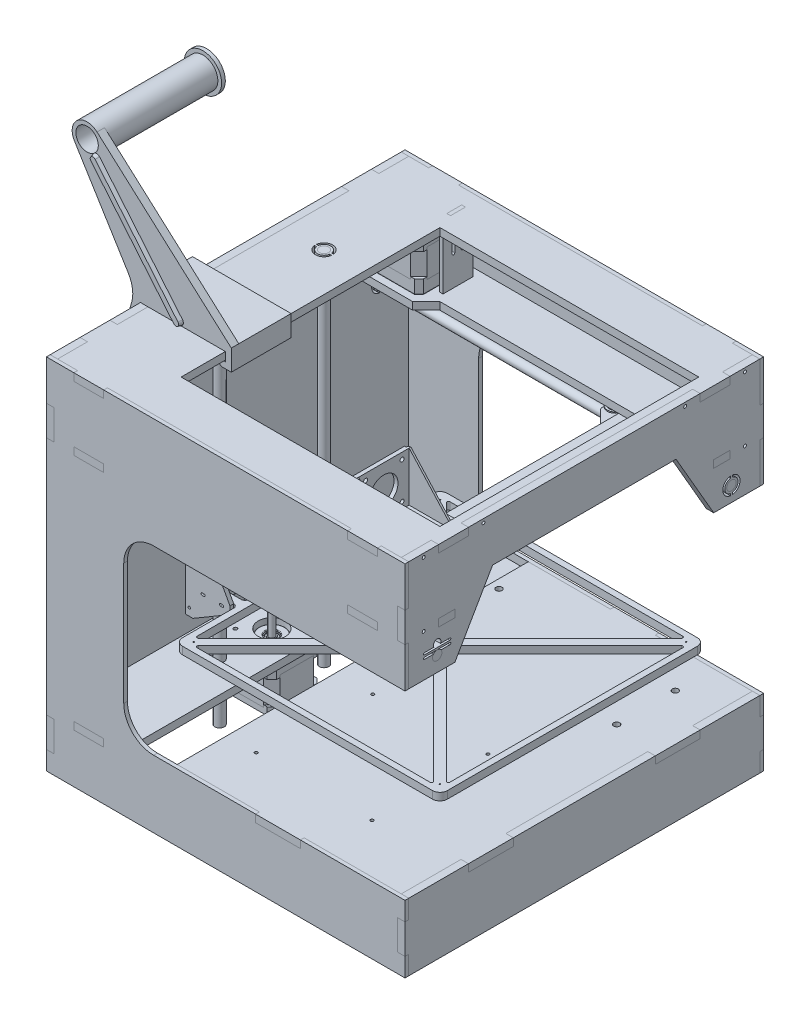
SolidWorks part; units mm, degrees
other "<NEMA 17 - short>-<Cuerpo-1-solid1>"
other "<NEMA 17 - short>-<Tapa-1-solid1>"
other "<NEMA 17 - short>-<instrument ball bearing_68_am-2-solid1>"
other "<NEMA 17 - short>-<Cut-Extrude1[1]>"
other "<NEMA 17 - short>-<Cut-Extrude1[2]>"
other "<NEMA 17 - short>-<Cut-Extrude1[3]>"
other "<NEMA 17 - short>-<Cut-Extrude1[4]>"
other "<NEMA 17 - short>-<Cut-Extrude1[5]>"
other "<NEMA 17 - short>-<Cut-Extrude1[6]>"
other "<NEMA 17 - tall>-<Cuerpo-1-solid1>"
other "<NEMA 17 - tall>-<Tapa-1-solid1>"
other "<NEMA 17 - tall>-<pan cross head_am-1-solid1>"
other "<NEMA 17 - tall>-<pan cross head_am-2-solid1>"
other "<NEMA 17 - tall>-<pan cross head_am-3-solid1>"
other "<NEMA 17 - tall>-<pan cross head_am-4-solid1>"
other "<NEMA 17 - tall>-<instrument ball bearing_68_am-2-solid1>"
other "<NEMA 17 - tall>-<instrument ball bearing_68_am-4-solid1>"
other "<NEMA 17 - tall>-<Boss-Extrude1>"
other "<idler_pulley_16_toothless_6mm_OD_GT2>-<Revolve1>"
other "<idler_pulley_16_toothless_6mm_OD_GT2>-<Revolve1>"
other "<idler_pulley_16_toothless_6mm_OD_GT2>-<Revolve1>"
other "<idler_pulley_16_toothless_6mm_OD_GT2>-<Revolve1>"
other "<NEMA 17 - tall>-<Cuerpo-1-solid1>"
other "<NEMA 17 - tall>-<Tapa-1-solid1>"
other "<NEMA 17 - tall>-<pan cross head_am-1-solid1>"
other "<NEMA 17 - tall>-<pan cross head_am-2-solid1>"
other "<NEMA 17 - tall>-<pan cross head_am-3-solid1>"
other "<NEMA 17 - tall>-<pan cross head_am-4-solid1>"
other "<NEMA 17 - tall>-<instrument ball bearing_68_am-2-solid1>"
other "<NEMA 17 - tall>-<instrument ball bearing_68_am-4-solid1>"
other "<NEMA 17 - tall>-<Boss-Extrude1>"
other "<pulley_20_teeth_16_GT2>-<Revolve1>"
other "<material_arm>-<Boss-Extrude5>"
other "<idler_pulley_16_toothless_6mm_OD_GT2>-<Revolve1>"
other "<idler_pulley_16_toothless_6mm_OD_GT2>-<Revolve1>"
other "<Smoothieboard_X5>-<Schnitt-Linear austragen7[6]>"
other "<Smoothieboard_X5>-<Schnitt-Linear austragen7[3]>"
other "<Smoothieboard_X5>-<Schnitt-Linear austragen7[1]>"
other "<Smoothieboard_X5>-<Schnitt-Linear austragen7[11]>"
other "<Smoothieboard_X5>-<Schnitt-Linear austragen7[9]>"
other "<Smoothieboard_X5>-<Schnitt-Linear austragen7[7]>"
other "<Smoothieboard_X5>-<Schnitt-Linear austragen7[10]>"
other "<Smoothieboard_X5>-<Schnitt-Linear austragen7[5]>"
other "<Smoothieboard_X5>-<Schnitt-Linear austragen7[12]>"
other "<Smoothieboard_X5>-<Schnitt-Linear austragen7[4]>"
other "<Smoothieboard_X5>-<Schnitt-Linear austragen7[8]>"
other "<Smoothieboard_X5>-<Schnitt-Linear austragen7[2]>"
other "<e3d to linear rail mount>-<Ø5.5 (5.5) Diameter Hole1>"
other "<e3d to linear rail mount>-<Ø4.2 (4.2) Diameter Hole1>"
other "<e3d_BRACKET_PRINTED>-<Solid1>"
other "<e3d to linear rail mount>-<Boss-Extrude1>"
other "<Smoothieboard_X5>-<Verrundung2>"
ref_plane "Front Plane" through (0, 0, 0) normal (0, 0, 1) x (1, 0, 0)
ref_plane "Top Plane" through (0, 0, 0) normal (0, 1, 0) x (1, 0, 0)
ref_plane "Right Plane" through (0, 0, 0) normal (1, 0, 0) x (0, 0, -1)
sketch "F_bounding_box" plane through (0, 0, 0) normal (0, 0, 1) x (1, 0, 0)
  line L1 (0, 0) -> (304.8, 0) construction
  line L2 (0, 0) -> (0, 304.8) construction
  line L3 (0, 304.8) -> (304.8, 304.8) construction
  line L4 (304.8, 0) -> (304.8, 304.8) construction
  dimension "D1" = 304.8
sketch "T_bounding_box" plane through (0, 0, 0) normal (0, 1, 0) x (1, 0, 0)
  line L0 (0, 0) -> (304.8, 0) construction
  line L1 (0, 0) -> (304.8, 0) construction
  line L2 (0, 0) -> (0, 304.8) construction
  line L3 (0, 304.8) -> (304.8, 304.8) construction
  line L4 (304.8, 0) -> (304.8, 304.8) construction
sketch "R_bounding_box" plane through (0, 0, 0) normal (1, 0, 0) x (0, 0, -1)
  line L1 (0, 0) -> (304.8, 0) construction
  line L2 (0, 0) -> (0, 304.8) construction
  line L3 (0, 304.8) -> (304.8, 304.8) construction
  line L4 (304.8, 0) -> (304.8, 304.8) construction
sketch "bottom_outline" plane through (0, 0, 0) normal (0, 1, 0) x (1, 0, 0)
  line L0 (0, 0) -> (0, 304.8) construction
  line L1 (6.35, 6.35) -> (6.35, 298.45) construction
  line L2 (18.225, 131.4) -> (60.225, 131.4) construction
  line L3 (18.225, 131.4) -> (18.225, 173.4) construction
  line L4 (18.225, 173.4) -> (60.225, 173.4) construction
  line L5 (60.225, 131.4) -> (60.225, 173.4) construction
  line L6 (60.225, 152.4) -> (18.225, 152.4) construction
  line L7 (182.1, 152.4) -> (60.225, 152.4) construction
  line L9 (0, 0) -> (304.8, 0) construction
  line L10 (298.45, 6.35) -> (6.35, 6.35) construction
  line L11 (298.45, 6.35) -> (298.45, 298.45) construction
  line L12 (298.45, 298.45) -> (6.35, 298.45) construction
  line L14 (39.225, 115.525) -> (39.225, 118.7) construction
  line L15 (39.225, 131.4) -> (39.225, 173.4) construction
  line L16 (0, 304.8) -> (304.8, 304.8) construction
  line L17 (292.1, 42.4) -> (72.1, 42.4) construction
  line L18 (292.1, 42.4) -> (292.1, 262.4) construction
  line L19 (292.1, 262.4) -> (72.1, 262.4) construction
  line L20 (72.1, 42.4) -> (72.1, 262.4) construction
  line L21 (292.1, 42.4) -> (72.1, 262.4) construction
  line L22 (292.1, 262.4) -> (72.1, 42.4) construction
  line L27 (39.225, 118.7) -> (39.225, 131.4) construction
  line L32 (6.35, 152.4) -> (0, 152.4) construction
  line L37 (72.1, 152.4) -> (6.35, 152.4) construction
  line L38 (0, 0) -> (0, 304.8) construction
  circle A0 centre (39.225, 108.025) radius 10.675 construction
  circle A1 centre (39.225, 108.025) radius 7.5 construction
  circle A4 centre (39.225, 152.4) radius 11.25 construction
  circle A5 centre (39.225, 196.775) radius 10.675 construction
  circle A6 centre (39.225, 196.775) radius 7.5 construction
  point P4 (0, 152.4)
  point P15 (18.225, 152.4)
  dimension "D4" = 15
  dimension "D5" = 3.175
  dimension "D6" = 22.5
  dimension "D13" = 12.7
  dimension "D1" = 42
  dimension "D2" = 6.35
  dimension "D3" = 6.35
  dimension "D7" = 220
  dimension "D8" = 6.35
  dimension "D12" = 6.35
ref_plane "mid-plane" through (0, 0, -152.4) normal (0, 0, 1) x (1, 0, 0)
ref_plane "top_plane" through (0, 304.8, 0) normal (0, 1, 0) x (1, 0, 0)
sketch "top_outline" plane through (0, 304.8, 0) normal (0, 1, 0) x (1, 0, 0)
  line L0 (298.45, 6.35) -> (6.35, 6.35) construction
  line L1 (0, 0) -> (304.8, 0) construction
  line L2 (0, 0) -> (0, 304.8) construction
  line L3 (0, 304.8) -> (304.8, 304.8) construction
  line L4 (304.8, 0) -> (304.8, 304.8) construction
  line L5 (298.45, 6.35) -> (298.45, 298.45) construction
  line L6 (298.45, 298.45) -> (6.35, 298.45) construction
  line L7 (6.35, 6.35) -> (6.35, 298.45) construction
  line L8 (298.45, 6.35) -> (6.35, 6.35) construction
  line L9 (298.45, 6.35) -> (298.45, 298.45) construction
  line L10 (298.45, 298.45) -> (6.35, 298.45) construction
  line L11 (6.35, 6.35) -> (6.35, 298.45) construction
  line L12 (292.1, 42.4) -> (72.1, 42.4) construction
  line L13 (292.1, 42.4) -> (292.1, 262.4) construction
  line L14 (292.1, 262.4) -> (72.1, 262.4) construction
  line L15 (72.1, 42.4) -> (72.1, 262.4) construction
  line L16 (292.1, 42.4) -> (72.1, 42.4) construction
  line L17 (292.1, 42.4) -> (292.1, 262.4) construction
  line L18 (292.1, 262.4) -> (72.1, 262.4) construction
  line L19 (72.1, 42.4) -> (72.1, 262.4) construction
  line L20 (39.225, 152.4) -> (39.225, 0) construction
  line L21 (39.225, 152.4) -> (0, 152.4) construction
  line L22 (60.225, 298.45) -> (18.225, 298.45) construction
  line L23 (60.225, 6.35) -> (18.225, 6.35) construction
  line L24 (60.225, 6.35) -> (60.225, 48.35) construction
  line L25 (60.225, 48.35) -> (18.225, 48.35) construction
  line L26 (18.225, 6.35) -> (18.225, 48.35) construction
  line L27 (60.225, 6.35) -> (18.225, 48.35) construction
  line L28 (60.225, 48.35) -> (18.225, 6.35) construction
  line L29 (18.225, 298.45) -> (18.225, 256.45) construction
  line L30 (60.225, 256.45) -> (18.225, 256.45) construction
  line L31 (60.225, 298.45) -> (60.225, 256.45) construction
  line L32 (39.225, 27.35) -> (298.45, 27.35) construction
  line L33 (39.225, 256.45) -> (39.225, 298.45) construction
  line L34 (39.225, 277.45) -> (298.45, 277.45) construction
  circle A0 centre (39.225, 152.4) radius 11.25 construction
  circle A3 centre (39.225, 108.025) radius 7.5 construction
  circle A4 centre (39.225, 108.025) radius 10.675 construction
  circle A5 centre (39.225, 152.4) radius 11.25 construction
  circle A8 centre (39.225, 108.025) radius 7.5 construction
  circle A9 centre (39.225, 108.025) radius 10.675 construction
  circle A10 centre (39.225, 196.775) radius 7.5 construction
  circle A11 centre (39.225, 196.775) radius 10.675 construction
  circle A12 centre (39.225, 196.775) radius 7.5 construction
  circle A13 centre (39.225, 196.775) radius 10.675 construction
  point P5 (39.225, 27.35)
  dimension "D1" = 42
ref_plane "Plane2" through (304.8, 0, 0) normal (1, 0, 0) x (0, 0, -1)
sketch "Sketch1" plane through (0, 0, 0) normal (0, 1, 0) x (1, 0, 0)
  circle A0 centre (39.225, 108.025) radius 4
  circle A1 centre (39.225, 196.775) radius 4
  dimension "D1" = 8
extrude "Y rails" add sketch "Sketch1" along normal up to surface (304.8 mm away)
sketch "front_outline" plane through (304.8, 0, 0) normal (1, 0, 0) x (0, 0, -1)
  line L0 (27.35, 223.9) -> (27.35, 304.8) construction
  line L1 (0, 0) -> (304.8, 0) construction
  line L2 (0, 0) -> (0, 304.8) construction
  line L3 (0, 304.8) -> (304.8, 304.8) construction
  line L4 (304.8, 0) -> (304.8, 304.8) construction
  line L5 (152.4, 0) -> (152.4, 304.8) construction
  circle A0 centre (27.35, 223.9) radius 4
  circle A1 centre (277.45, 223.9) radius 4
  dimension "D1" = 8
  dimension "D2" = 80.9
extrude "X rails" add sketch "front_outline" against normal up to surface (304.8 mm away) separate body
ref_plane "YZ plane" through (228.6, 0, 0) normal (1, 0, 0) x (0, 0, -1)
sketch "Sketch3" plane through (228.6, 0, 0) normal (1, 0, 0) x (0, 0, -1)
  circle A0 centre (27.35, 223.9) radius 7.5
  circle A1 centre (277.45, 223.9) radius 7.5
  circle A2 centre (277.45, 223.9) radius 4
  circle A3 centre (27.35, 223.9) radius 4
  circle A4 centre (27.35, 223.9) radius 4 construction
  circle A5 centre (277.45, 223.9) radius 4 construction
  dimension "D1" = 15
extrude "Z bearings" add sketch "Sketch3" along normal mid plane 24.25 separate body
ref_plane "traveling plate" through (0, 231.4, 0) normal (0, 1, 0) x (1, 0, 0)
sketch "Sketch4" plane through (0, 231.4, 0) normal (0, 1, 0) x (1, 0, 0)
  line L0 (242.725, 30.35) -> (254, 30.35) construction
  line L1 (254, 12.7) -> (203.2, 12.7) construction
  line L2 (254, 12.7) -> (254, 292.1) construction
  line L3 (254, 292.1) -> (203.2, 292.1) construction
  line L4 (203.2, 12.7) -> (203.2, 292.1) construction
  line L5 (242.1, 21.35) -> (215.1, 21.35)
  line L6 (242.1, 21.35) -> (242.1, 33.35)
  line L7 (242.1, 33.35) -> (215.1, 33.35)
  line L8 (215.1, 21.35) -> (215.1, 33.35)
  line L9 (216.475, 34.85) -> (216.475, 19.85) construction
  line L10 (216.475, 34.85) -> (216.475, 19.85) construction
  line L11 (240.725, 19.85) -> (240.725, 34.85) construction
  line L12 (240.725, 19.85) -> (240.725, 34.85) construction
  line L13 (240.725, 19.85) -> (216.475, 19.85) construction
  line L14 (216.475, 34.85) -> (240.725, 34.85) construction
  line L15 (228.6, 19.85) -> (228.6, 21.35) construction
  line L16 (240.725, 27.35) -> (242.1, 27.35) construction
  line L17 (228.6, 19.85) -> (228.6, 12.7) construction
  line L18 (203.2, 152.4) -> (254, 152.4) construction
  line L19 (182.1, 152.4) -> (60.225, 152.4) construction
  line L20 (214.475, 36.85) -> (214.475, 17.85) construction
  line L21 (242.725, 17.85) -> (214.475, 17.85) construction
  line L22 (242.725, 17.85) -> (242.725, 36.85) construction
  line L23 (214.475, 36.85) -> (242.725, 36.85) construction
  line L24 (242.1, 283.45) -> (215.1, 283.45)
  line L25 (242.1, 283.45) -> (242.1, 271.45)
  line L26 (242.1, 271.45) -> (215.1, 271.45)
  line L27 (215.1, 283.45) -> (215.1, 271.45)
  line L28 (228.6, 12.7) -> (228.6, 292.1) construction
  line L30 (241.3, 49.55) -> (215.9, 49.55) construction
  line L31 (241.3, 50.8651) -> (241.3, 253.9349)
  line L32 (241.3, 255.25) -> (215.9, 255.25) construction
  line L33 (215.9, 52.1284) -> (215.9, 253.9349)
  line L34 (241.3, 49.55) -> (215.9, 255.25) construction
  line L35 (241.3, 255.25) -> (215.9, 49.55) construction
  line L37 (253.0701, 37.7799) -> (242.2299, 48.6201)
  line L38 (254, 15.0401) -> (254, 35.5349)
  line L39 (253.0701, 267.0201) -> (242.2299, 256.1799)
  line L40 (204.1299, 267.0201) -> (214.9701, 256.1799)
  line L41 (254, 289.7599) -> (254, 269.2651)
  line L42 (203.2, 289.7599) -> (203.2, 269.2651)
  line L43 (228.6, 3.175) -> (228.6, 301.625) construction
  line L44 (203.6591, 12.5577) -> (221.1848, 7.1273)
  line L45 (222.1246, 6.985) -> (235.0754, 6.985)
  line L46 (236.0152, 7.1273) -> (251.7647, 12.0074)
  line L47 (236.0152, 297.6727) -> (251.7647, 292.7926)
  line L48 (222.1246, 297.815) -> (235.0754, 297.815)
  line L49 (221.1848, 297.6727) -> (205.4353, 292.7926)
  line L55 (202.7194, 12.7) -> (176.7575, 12.7)
  line L56 (173.5825, 15.875) -> (173.5825, 38.1)
  line L57 (176.106, 41.2074) -> (213.3765, 49.021)
  circle A0 centre (237.425, 16.6) radius 1.25
  circle A4 centre (219.775, 16.6) radius 1.25
  circle A5 centre (219.775, 38.1) radius 1.25
  circle A6 centre (237.425, 38.1) radius 1.25
  circle A7 centre (237.425, 266.7) radius 1.25
  circle A8 centre (219.775, 266.7) radius 1.25
  circle A9 centre (237.425, 288.2) radius 1.25
  circle A10 centre (219.775, 288.2) radius 1.25
  circle A11 centre (228.6, 14.9) radius 1.25 construction
  circle A12 centre (228.6, 39.9) radius 1.25
  circle A13 centre (228.6, 64.9) radius 1.25
  circle A14 centre (228.6, 89.9) radius 1.25
  circle A15 centre (228.6, 114.9) radius 1.25
  circle A16 centre (228.6, 139.9) radius 1.25
  circle A17 centre (228.6, 164.9) radius 1.25
  circle A18 centre (228.6, 189.9) radius 1.25
  circle A19 centre (228.6, 214.9) radius 1.25
  circle A20 centre (228.6, 239.9) radius 1.25
  circle A21 centre (228.6, 264.9) radius 1.25
  circle A22 centre (228.6, 289.9) radius 1.25 construction
  circle A23 centre (248.3625, 30.35) radius 1.25
  circle A24 centre (208.8375, 30.35) radius 1.25
  circle A25 centre (248.3625, 274.45) radius 1.25
  circle A26 centre (208.8375, 274.45) radius 1.25
  circle A27 centre (228.6, 11.43) radius 8.255 construction
  circle A28 centre (228.6, 11.43) radius 1.25
  circle A29 centre (228.6, 293.37) radius 1.25
  arc A30 (253.0701, 267.0201) -> (254, 269.2651) centre (250.825, 269.2651) ccw
  arc A31 (241.3, 253.9349) -> (242.2299, 256.1799) centre (244.475, 253.9349) cw
  arc A32 (204.1299, 267.0201) -> (203.2, 269.2651) centre (206.375, 269.2651) cw
  arc A33 (214.9701, 256.1799) -> (215.9, 253.9349) centre (212.725, 253.9349) cw
  arc A34 (242.2299, 48.6201) -> (241.3, 50.8651) centre (244.475, 50.8651) cw
  arc A35 (253.0701, 37.7799) -> (254, 35.5349) centre (250.825, 35.5349) cw
  arc A36 (251.7647, 12.0074) -> (254, 15.0401) centre (250.825, 15.0401) ccw
  arc A37 (235.0754, 6.985) -> (236.0152, 7.1273) centre (235.0754, 10.16) ccw
  arc A38 (221.1848, 7.1273) -> (222.1246, 6.985) centre (222.1246, 10.16) ccw
  arc A42 (222.1246, 297.815) -> (221.1848, 297.6727) centre (222.1246, 294.64) ccw
  arc A43 (254, 289.7599) -> (251.7647, 292.7926) centre (250.825, 289.7599) ccw
  arc A44 (235.0754, 297.815) -> (236.0152, 297.6727) centre (235.0754, 294.64) cw
  arc A45 (205.4353, 292.7926) -> (203.2, 289.7599) centre (206.375, 289.7599) ccw
  arc A50 (213.3765, 49.021) -> (215.9, 52.1284) centre (212.725, 52.1284) ccw
  arc A51 (202.7194, 12.7) -> (203.6591, 12.5577) centre (202.7194, 9.525) cw
  arc A52 (176.7575, 12.7) -> (173.5825, 15.875) centre (176.7575, 15.875) cw
  arc A53 (173.5825, 38.1) -> (176.106, 41.2074) centre (176.7575, 38.1) cw
  point P46 (228.6, 152.4)
  point P93 (228.6, 152.4)
  point P103 (254, 267.95)
  point P109 (203.2, 267.95)
  point P118 (254, 36.85)
  point P124 (235.5561, 6.985)
  point P127 (221.6439, 6.985)
  point P133 (203.2, 36.85)
  point P147 (221.6439, 297.815)
  line B0 (176.7575, 21.35) -> (203.7575, 21.35)
  line B1 (176.7575, 21.35) -> (176.7575, 33.35)
  line B2 (176.7575, 33.35) -> (203.7575, 33.35)
  line B3 (203.7575, 21.35) -> (203.7575, 33.35)
  circle B4 centre (199.0825, 16.6) radius 1.25
  circle B5 centre (181.4325, 16.6) radius 1.25
  circle B6 centre (181.4325, 38.1) radius 1.25
  circle B7 centre (199.0825, 38.1) radius 1.25
sketch_block_instance "Block7-1"
sketch_block "Block7" parameters "D5"=2.0693, "D13"=1.4362, "D14"=3, "D17"=10.2316, "D19"=3.175, "D20"=3.175, "D22"=3.175, "D23"=2.5, "D1"=29.031, "D2"=19.5746, "D3"=33.3625, "D4"=278.9867, "D7"=3.9093, "D8"=27, "D9"=25.4, "D11"=125.3169, "D12"=12.5634, "D15"=1.375, "D16"=324.2663, "D18"=12.6581, "D21"=12, "D6"=2, "D10"=12
extrude "Z rail support" add sketch "Sketch4" along normal mid plane 6.35 separate body
sketch "Sketch5" plane through (0, -8.65, -152.4) normal (0, 0, -1) x (-1, 0, 0)
  line L0 (-228.6, 243.225) -> (-228.6, 251.225) construction
  line L1 (-234.6, 243.225) -> (-222.6, 243.225)
  line L2 (-234.6, 243.225) -> (-234.6, 249.475)
  line L3 (-234.6, 251.225) -> (-222.6, 251.225)
  line L4 (-222.6, 243.225) -> (-222.6, 249.475)
  line L5 (-234.6, 249.975) -> (-222.6, 249.975) construction
  line L6 (-234.6, 250.475) -> (-234.6, 251.225)
  line L7 (-222.6, 250.475) -> (-222.6, 251.225)
  line L8 (-215.9, 243.225) -> (-241.3, 243.225) construction
  arc A0 (-234.6, 249.475) -> (-234.6, 250.475) centre (-234.6, 249.975) ccw
  arc A1 (-222.6, 250.475) -> (-222.6, 249.475) centre (-222.6, 249.975) ccw
  dimension "D3" = 1
  dimension "D1" = 12
  dimension "D2" = 8
  dimension "D4" = 1.25
extrude "linear rail" add sketch "Sketch5" against normal mid plane 266.7 separate body
ref_plane "Plane5" through (0, 0, -76.2) normal (0, 0, 1) x (1, 0, 0)
sketch "Sketch6" plane through (0, 0, -76.2) normal (0, 0, 1) x (1, 0, 0)
  line L0 (228.6, 234.575) -> (228.6, 237.575) construction
  line L1 (215.1, 237.575) -> (242.1, 237.575) construction
  line L2 (215.1, 237.575) -> (215.1, 247.575)
  line L3 (215.1, 247.575) -> (242.1, 247.575)
  line L4 (242.1, 237.575) -> (242.1, 247.575)
  line L5 (234.6, 240.825) -> (234.6, 237.575)
  line L6 (222.6, 240.825) -> (222.6, 237.575)
  line L7 (215.1, 237.575) -> (234.6, 237.575) construction
  line L8 (222.6, 237.575) -> (242.1, 237.575) construction
  line L9 (215.1, 237.575) -> (222.6, 237.575)
  line L10 (234.6, 234.575) -> (234.6, 240.825)
  line L11 (222.6, 234.575) -> (234.6, 234.575)
  line L12 (222.6, 240.825) -> (222.6, 234.575)
  line L13 (222.6, 242.575) -> (222.6, 241.825)
  line L14 (234.6, 242.575) -> (222.6, 242.575)
  line L15 (234.6, 241.825) -> (234.6, 242.575)
  line L16 (234.6, 234.575) -> (234.6, 240.825) construction
  line L17 (222.6, 234.575) -> (234.6, 234.575) construction
  line L18 (222.6, 240.825) -> (222.6, 234.575) construction
  line L19 (222.6, 242.575) -> (222.6, 241.825)
  line L20 (234.6, 242.575) -> (222.6, 242.575)
  line L21 (234.6, 241.825) -> (234.6, 242.575)
  line L22 (234.6, 237.575) -> (242.1, 237.575)
  arc A2 (222.6, 240.825) -> (222.6, 241.825) centre (222.6, 241.325) ccw
  arc A3 (234.6, 241.825) -> (234.6, 240.825) centre (234.6, 241.325) ccw
  arc A4 (222.6, 240.825) -> (222.6, 241.825) centre (222.6, 241.325) ccw
  arc A5 (234.6, 241.825) -> (234.6, 240.825) centre (234.6, 241.325) ccw
  dimension "D2" = 13
  dimension "D3" = 10
  dimension "D4" = 27
  dimension "D1" = 0
extrude "linear_slide" add sketch "Sketch6" along normal mid plane 46 separate body
sketch "Sketch19" plane through (0, 247.575, 0) normal (0, 1, 0) x (1, 0, 0)
  line L0 (218.6, 86.2) -> (238.6, 86.2) construction
  line L1 (238.6, 86.2) -> (238.6, 66.2) construction
  line L2 (238.6, 66.2) -> (218.6, 66.2) construction
  line L3 (218.6, 66.2) -> (218.6, 86.2) construction
  line L4 (228.6, 53.2) -> (228.6, 86.2) construction
  line L5 (242.1, 53.2) -> (215.1, 53.2) construction
  line L6 (228.6, 66.2) -> (228.6, 99.2) construction
  line L7 (242.1, 99.2) -> (215.1, 99.2) construction
  circle A0 centre (218.6, 66.2) radius 1.5
  circle A1 centre (238.6, 66.2) radius 1.5
  circle A2 centre (238.6, 86.2) radius 1.5
  circle A3 centre (218.6, 86.2) radius 1.5
  dimension "D2" = 3
  dimension "D1" = 20
extrude "linear_slide_holes" cut sketch "Sketch19" against normal blind 4
inserted part "NEMA 17 - short"
move or copy body "Body-Move/Copy4" placed by mates yes
other "Distance2" parameters "D1"=3.175
inserted part "NEMA 17 - tall"
move or copy body "Body-Move/Copy6" placed by mates yes
other "Distance3" parameters "D1"=297.45
ref_plane "Plane6" through (0, 41.7902, 0) normal (0, 1, 0) x (1, 0, 0)
sketch "Sketch7" plane through (0, 41.7902, 0) normal (0, 1, 0) x (1, 0, 0)
  line L0 (46.527, 196.775) -> (31.9698, 196.775) construction
  line L1 (46.4802, 197.6005) -> (44.8154, 197.6005)
  line L2 (46.4802, 195.9495) -> (44.8154, 195.9495)
  line L3 (46.527, 197.6005) -> (31.923, 197.6005) construction
  line L4 (46.527, 195.9495) -> (31.923, 195.9495) construction
  line L5 (33.6346, 197.6005) -> (31.9698, 197.6005)
  line L6 (33.6346, 195.9495) -> (31.9698, 195.9495)
  line L7 (39.225, 152.4) -> (19.075, 152.4) construction
  line L8 (19.075, 169.1358) -> (19.075, 135.6642) construction
  line L13 (36.0505, 118.82) -> (36.0505, 97.23) construction
  line L16 (32.7485, 118.82) -> (32.7485, 97.23) construction
  line L17 (33.574, 118.82) -> (33.574, 97.23)
  line L18 (31.923, 118.82) -> (31.923, 97.23)
  line L19 (36.876, 118.82) -> (36.876, 97.23)
  line L20 (35.225, 118.82) -> (35.225, 97.23)
  line L21 (39.225, 108.025) -> (32.7485, 108.025) construction
  line L22 (6.35, 6.35) -> (6.35, 298.45) construction
  line L23 (6.35, 6.35) -> (6.35, 298.45) construction
  line L24 (72.1, 42.4) -> (72.1, 262.4) construction
  line L25 (72.1, 42.4) -> (72.1, 262.4) construction
  line L26 (6.35, 301.625) -> (6.35, 298.45)
  line L27 (23.35, 3.175) -> (23.35, 0)
  line L28 (23.35, 301.625) -> (6.35, 301.625) construction
  line L29 (23.35, 3.175) -> (6.35, 3.175)
  line L31 (23.35, 301.625) -> (23.35, 304.8)
  line L32 (23.35, 304.8) -> (48.75, 304.8)
  line L33 (48.75, 304.8) -> (48.75, 301.625)
  line L34 (48.75, 301.625) -> (65.75, 301.625)
  line L35 (65.75, 301.625) -> (65.75, 3.175)
  line L36 (0, 304.8) -> (304.8, 304.8) construction
  line L42 (6.35, 298.45) -> (6.35, 276.225)
  line L43 (6.35, 276.225) -> (0, 276.225)
  line L44 (0, 276.225) -> (0, 250.825)
  line L45 (0, 250.825) -> (6.35, 250.825)
  line L46 (6.35, 250.825) -> (6.35, 53.975) construction
  line L47 (6.35, 53.975) -> (0, 53.975)
  line L48 (0, 53.975) -> (0, 28.575)
  line L49 (0, 28.575) -> (6.35, 28.575)
  line L50 (6.35, 28.575) -> (6.35, 6.35)
  line L51 (0, 0) -> (0, 304.8) construction
  line L52 (23.35, 0) -> (48.75, 0)
  line L53 (48.75, 0) -> (48.75, 3.175)
  line L54 (48.75, 3.175) -> (65.75, 3.175)
  line L55 (6.35, 6.35) -> (6.35, 3.175)
  line L56 (46.527, 196.775) -> (31.923, 196.775) construction
  line L57 (6.35, 212.725) -> (48.26, 212.725)
  line L58 (6.35, 212.725) -> (6.35, 244.475)
  line L59 (6.35, 244.475) -> (48.26, 244.475)
  line L60 (50.8, 215.265) -> (50.8, 241.935)
  line L61 (6.35, 53.975) -> (6.35, 212.725)
  line L62 (6.35, 244.475) -> (6.35, 250.825)
  line L63 (12.85, 294.125) -> (12.85, 301.625) construction
  line L64 (10.35, 294.125) -> (10.35, 301.625)
  line L65 (15.35, 294.125) -> (15.35, 301.625)
  line L66 (6.35, 301.625) -> (10.35, 301.625)
  line L67 (15.35, 301.625) -> (23.35, 301.625)
  circle A0 centre (39.225, 152.4) radius 11.5 construction
  circle A1 centre (39.225, 152.4) radius 11.5
  circle A2 centre (54.725, 136.9) radius 1.5 construction
  circle A3 centre (54.725, 167.9) radius 1.5 construction
  circle A4 centre (23.725, 167.9) radius 1.5 construction
  circle A5 centre (23.725, 136.9) radius 1.5 construction
  circle A6 centre (54.725, 136.9) radius 1.5
  circle A7 centre (54.725, 167.9) radius 1.5
  circle A8 centre (23.725, 167.9) radius 1.5
  circle A9 centre (23.725, 136.9) radius 1.5
  circle A11 centre (39.225, 196.775) radius 4 construction
  circle A13 centre (39.225, 196.775) radius 4 construction
  arc A14 (44.8154, 197.6005) -> (33.6346, 197.6005) centre (39.225, 196.775) ccw
  arc A15 (31.9698, 195.9495) -> (46.4802, 195.9495) centre (39.225, 196.775) ccw
  circle A16 centre (39.225, 196.775) radius 7.302 construction
  arc A17 (46.4802, 197.6005) -> (31.9698, 197.6005) centre (39.225, 196.775) ccw
  circle A18 centre (39.225, 196.775) radius 5.651 construction
  arc A19 (33.6346, 195.9495) -> (44.8154, 195.9495) centre (39.225, 196.775) ccw
  circle A23 centre (39.225, 108.025) radius 4 construction
  circle A24 centre (39.225, 108.025) radius 4
  arc A27 (33.574, 118.82) -> (31.923, 118.82) centre (32.7485, 118.82) ccw
  arc A28 (31.923, 97.23) -> (33.574, 97.23) centre (32.7485, 97.23) ccw
  arc A29 (48.26, 244.475) -> (50.8, 241.935) centre (48.26, 241.935) cw
  arc A30 (36.876, 118.82) -> (35.225, 118.82) centre (36.0505, 118.82) ccw
  arc A31 (35.225, 97.23) -> (36.876, 97.23) centre (36.0505, 97.23) ccw
  arc A32 (48.26, 212.725) -> (50.8, 215.265) centre (48.26, 215.265) ccw
  circle A33 centre (30.399, 108.025) radius 3.175
  arc A34 (10.35, 294.125) -> (15.35, 294.125) centre (12.85, 294.125) ccw
  circle A35 centre (39.225, 196.775) radius 4
  point P43 (36.0505, 108.025)
  point P49 (32.7485, 108.025)
  point P92 (50.8, 244.475)
  point P95 (50.8, 212.725)
  dimension "D1" = 1.651
  dimension "D9" = 6.35
  dimension "D18" = 2.54
  dimension "D20" = 10
  dimension "D5" = 21.59
  dimension "D6" = 1.651
  dimension "D7" = 1.651
  dimension "D8" = 1.651
  dimension "D10" = 6.35
  dimension "D11" = 25.4
  dimension "D12" = 25.4
  dimension "D13" = 3.175
  dimension "D14" = 25.4
  dimension "D15" = 44.45
  dimension "D16" = 31.75
  dimension "D17" = 6.35
  dimension "D19" = 4
  dimension "D21" = 5
  dimension "D2" = 1.651
  dimension "D3" = 0.8255
  dimension "D4" = 0.8255
extrude "Y_motor_mount" add sketch "Sketch7" along normal blind 6.35 separate body
sketch "Sketch8" plane through (0, 304.8, 0) normal (0, 1, 0) x (1, 0, 0)
  line L0 (36.876, 118.82) -> (36.876, 111.2626) construction
  line L1 (35.225, 118.82) -> (35.225, 97.23) construction
  line L2 (44.8154, 197.6005) -> (46.4802, 197.6005)
  line L3 (31.9698, 197.6005) -> (33.6346, 197.6005)
  line L4 (44.8154, 197.6005) -> (46.4802, 197.6005)
  line L5 (31.9698, 197.6005) -> (33.6346, 197.6005)
  line L6 (33.6346, 195.9495) -> (31.9698, 195.9495)
  line L7 (46.4802, 195.9495) -> (44.8154, 195.9495)
  line L8 (33.6346, 195.9495) -> (31.9698, 195.9495)
  line L9 (46.4802, 195.9495) -> (44.8154, 195.9495)
  line L10 (36.876, 104.7874) -> (36.876, 97.23) construction
  line L11 (31.923, 105.2397) -> (31.923, 97.23) construction
  line L12 (31.923, 118.82) -> (31.923, 110.8103) construction
  line L13 (33.574, 118.82) -> (33.574, 97.23) construction
  line L14 (36.876, 118.82) -> (36.876, 111.2626)
  line L15 (35.225, 118.82) -> (35.225, 97.23)
  line L16 (36.876, 104.7874) -> (36.876, 97.23)
  line L17 (31.923, 105.2397) -> (31.923, 97.23)
  line L18 (31.923, 118.82) -> (31.923, 110.8103)
  line L19 (33.574, 118.82) -> (33.574, 97.23)
  line L20 (48.75, 3.175) -> (65.75, 3.175) construction
  line L21 (298.45, 6.35) -> (298.45, 298.45) construction
  line L22 (6.35, 53.975) -> (6.35, 250.825)
  line L23 (22.075, 6.2) -> (56.375, 6.2) construction
  line L24 (56.375, 6.2) -> (60.375, 10.2) construction
  line L25 (60.375, 44.5) -> (56.375, 48.5) construction
  line L26 (22.075, 48.5) -> (18.075, 44.5) construction
  line L27 (18.075, 10.2) -> (22.075, 6.2) construction
  line L28 (56.375, 48.5) -> (22.075, 48.5) construction
  line L29 (60.375, 10.2) -> (60.375, 44.5) construction
  line L30 (18.075, 44.5) -> (18.075, 10.2) construction
  line L31 (22.075, 6.2) -> (56.375, 6.2) construction
  line L32 (56.375, 6.2) -> (60.375, 10.2) construction
  line L33 (60.375, 44.5) -> (56.375, 48.5) construction
  line L34 (22.075, 48.5) -> (18.075, 44.5) construction
  line L35 (18.075, 10.2) -> (22.075, 6.2) construction
  line L36 (56.375, 48.5) -> (22.075, 48.5) construction
  line L37 (60.375, 10.2) -> (60.375, 44.5) construction
  line L38 (18.075, 44.5) -> (18.075, 10.2) construction
  line L39 (22.075, 256.3) -> (18.075, 260.3) construction
  line L60 (6.35, 28.575) -> (6.35, 3.175)
  line L61 (298.45, 6.35) -> (6.35, 6.35) construction
  line L62 (298.45, 6.35) -> (6.35, 6.35) construction
  line L63 (6.35, 152.4) -> (72.1, 152.4) construction
  line L65 (0, 152.4) -> (304.8, 152.4) construction
  line L66 (304.8, 0) -> (304.8, 304.8) construction
  line L67 (152.4, 304.8) -> (152.4, 0) construction
  line L68 (0, 304.8) -> (304.8, 304.8) construction
  line L69 (0, 0) -> (304.8, 0) construction
  line L80 (281.45, 304.8) -> (281.45, 301.625)
  line L81 (256.05, 304.8) -> (281.45, 304.8)
  line L82 (256.05, 301.625) -> (256.05, 304.8)
  line L86 (256.05, 0) -> (256.05, 3.175)
  line L87 (281.45, 0) -> (256.05, 0)
  line L88 (281.45, 3.175) -> (281.45, 0)
  line L91 (292.1, 42.4) -> (292.1, 262.4) construction
  line L92 (292.1, 42.4) -> (72.1, 42.4) construction
  line L93 (72.1, 42.4) -> (72.1, 262.4) construction
  line L94 (292.1, 262.4) -> (72.1, 262.4) construction
  line L95 (292.1, 42.4) -> (292.1, 262.4)
  line L96 (292.1, 42.4) -> (72.1, 42.4)
  line L97 (72.1, 42.4) -> (72.1, 262.4)
  line L98 (292.1, 262.4) -> (72.1, 262.4)
  line L102 (56.375, 256.3) -> (22.075, 256.3) construction
  line L104 (298.45, 276.225) -> (304.8, 276.225)
  line L105 (304.8, 276.225) -> (304.8, 250.825)
  line L106 (304.8, 250.825) -> (298.45, 250.825)
  line L108 (298.45, 53.975) -> (304.8, 53.975)
  line L109 (304.8, 53.975) -> (304.8, 28.575)
  line L110 (304.8, 28.575) -> (298.45, 28.575)
  line L116 (48.75, 3.175) -> (256.05, 3.175)
  line L120 (298.45, 53.975) -> (298.45, 250.825)
  line L121 (281.45, 3.175) -> (298.45, 3.175)
  line L122 (256.05, 301.625) -> (48.75, 301.625)
  line L123 (298.45, 276.225) -> (298.45, 301.625)
  line L124 (60.375, 260.3) -> (56.375, 256.3) construction
  line L125 (60.375, 294.6) -> (60.375, 260.3) construction
  line L126 (56.375, 298.6) -> (60.375, 294.6) construction
  line L127 (22.075, 298.6) -> (56.375, 298.6) construction
  line L130 (298.45, 3.175) -> (298.45, 28.575)
  line L131 (298.45, 301.625) -> (281.45, 301.625)
  line L132 (6.35, 3.175) -> (23.35, 3.175)
  line L133 (23.35, 3.175) -> (23.35, 0)
  line L134 (23.35, 0) -> (48.75, 0)
  line L135 (48.75, 0) -> (48.75, 3.175)
  line L136 (48.75, 3.175) -> (65.75, 3.175)
  line L137 (65.75, 3.175) -> (65.75, 301.625)
  line L138 (65.75, 301.625) -> (48.75, 301.625)
  line L139 (48.75, 301.625) -> (48.75, 304.8)
  line L140 (48.75, 304.8) -> (23.35, 304.8)
  line L141 (23.35, 304.8) -> (23.35, 301.625)
  line L142 (23.35, 301.625) -> (15.35, 301.625)
  line L143 (6.35, 301.625) -> (6.35, 276.225)
  line L144 (6.35, 276.225) -> (0, 276.225)
  line L145 (0, 276.225) -> (0, 250.825)
  line L146 (0, 250.825) -> (6.35, 250.825)
  line L147 (48.26, 212.725) -> (6.35, 212.725)
  line L148 (6.35, 53.975) -> (0, 53.975)
  line L149 (0, 53.975) -> (0, 28.575)
  line L150 (0, 28.575) -> (6.35, 28.575)
  line L151 (6.35, 28.575) -> (6.35, 3.175)
  line L152 (6.35, 3.175) -> (23.35, 3.175)
  line L153 (23.35, 3.175) -> (23.35, 0)
  line L154 (23.35, 0) -> (48.75, 0)
  line L155 (48.75, 0) -> (48.75, 3.175)
  line L156 (18.075, 294.6) -> (22.075, 298.6) construction
  line L158 (6.35, 212.725) -> (6.35, 53.975)
  line L159 (48.75, 301.625) -> (48.75, 304.8)
  line L160 (48.75, 304.8) -> (23.35, 304.8)
  line L161 (23.35, 304.8) -> (23.35, 301.625)
  line L163 (6.35, 301.625) -> (6.35, 276.225)
  line L164 (6.35, 276.225) -> (0, 276.225)
  line L165 (0, 276.225) -> (0, 250.825)
  line L166 (0, 250.825) -> (6.35, 250.825)
  line L168 (6.35, 53.975) -> (0, 53.975)
  line L169 (0, 53.975) -> (0, 28.575)
  line L170 (0, 28.575) -> (6.35, 28.575)
  line L172 (6.35, 250.825) -> (6.35, 244.475)
  line L174 (6.35, 244.475) -> (48.26, 244.475)
  line L176 (50.8, 241.935) -> (50.8, 215.265)
  line L178 (18.075, 260.3) -> (18.075, 294.6) construction
  line L179 (10.35, 301.625) -> (15.35, 301.625)
  line L180 (64.65, 275.6625) -> (67.825, 275.6625)
  line L181 (10.35, 294.125) -> (10.35, 301.625)
  line L182 (10.35, 294.125) -> (10.35, 301.625) construction
  line L183 (10.35, 301.625) -> (6.35, 301.625)
  line L184 (10.35, 301.625) -> (6.35, 301.625)
  line L185 (15.35, 301.625) -> (15.35, 294.125)
  line L186 (15.35, 301.625) -> (15.35, 294.125) construction
  line L187 (64.65, 275.6625) -> (64.65, 288.3625)
  line L188 (23.35, 301.625) -> (15.35, 301.625)
  line L189 (64.65, 288.3625) -> (67.825, 288.3625)
  line L190 (67.825, 275.6625) -> (67.825, 288.3625)
  line L191 (72.1, 262.4) -> (72.1, 301.625) construction
  line L192 (72.1, 282.0125) -> (67.825, 282.0125) construction
  line L193 (64.65, 282.0125) -> (60.375, 282.0125) construction
  arc A2 (48.26, 212.725) -> (50.8, 215.265) centre (48.26, 215.265) ccw
  arc A8 (36.876, 118.82) -> (35.225, 118.82) centre (36.0505, 118.82) ccw construction
  arc A9 (35.225, 97.23) -> (36.876, 97.23) centre (36.0505, 97.23) ccw construction
  arc A10 (46.4802, 197.6005) -> (31.9698, 197.6005) centre (39.225, 196.775) ccw
  arc A11 (44.8154, 197.6005) -> (33.6346, 197.6005) centre (39.225, 196.775) ccw
  arc A12 (46.4802, 197.6005) -> (31.9698, 197.6005) centre (39.225, 196.775) ccw
  arc A13 (44.8154, 197.6005) -> (33.6346, 197.6005) centre (39.225, 196.775) ccw
  arc A14 (33.6346, 195.9495) -> (44.8154, 195.9495) centre (39.225, 196.775) ccw
  arc A15 (31.9698, 195.9495) -> (46.4802, 195.9495) centre (39.225, 196.775) ccw
  arc A16 (33.6346, 195.9495) -> (44.8154, 195.9495) centre (39.225, 196.775) ccw
  arc A17 (31.9698, 195.9495) -> (46.4802, 195.9495) centre (39.225, 196.775) ccw
  arc A18 (31.923, 97.23) -> (33.574, 97.23) centre (32.7485, 97.23) ccw construction
  arc A19 (33.574, 118.82) -> (31.923, 118.82) centre (32.7485, 118.82) ccw construction
  arc A20 (36.876, 118.82) -> (35.225, 118.82) centre (36.0505, 118.82) ccw
  arc A21 (35.225, 97.23) -> (36.876, 97.23) centre (36.0505, 97.23) ccw
  arc A22 (31.923, 97.23) -> (33.574, 97.23) centre (32.7485, 97.23) ccw
  arc A23 (33.574, 118.82) -> (31.923, 118.82) centre (32.7485, 118.82) ccw
  arc A24 (31.923, 110.8103) -> (31.923, 105.2397) centre (30.399, 108.025) ccw construction
  arc A25 (31.923, 110.8103) -> (31.923, 105.2397) centre (30.399, 108.025) ccw
  arc A26 (36.876, 104.7874) -> (36.876, 111.2626) centre (39.225, 108.025) ccw construction
  arc A27 (36.876, 104.7874) -> (36.876, 111.2626) centre (39.225, 108.025) ccw
  circle A34 centre (39.225, 196.775) radius 4 construction
  circle A35 centre (39.225, 196.775) radius 4
  arc A36 (50.8, 241.935) -> (48.26, 244.475) centre (48.26, 241.935) ccw
  arc A38 (10.35, 294.125) -> (15.35, 294.125) centre (12.85, 294.125) ccw
  arc A39 (10.35, 294.125) -> (15.35, 294.125) centre (12.85, 294.125) ccw construction
  dimension "D4" = 3.175
  dimension "D6" = 25.4
  dimension "D5" = 12.7
  dimension "D1" = 0
  dimension "D2" = 0
  dimension "D3" = 0
extrude "top_0.25in_Al" add sketch "Sketch8" against normal blind 6.35 separate body
ref_plane "motor_mount" through (0, 250.3258, 0) normal (0, -1, 0) x (-1, 0, 0)
sketch "Sketch13" plane through (0, 250.3258, 0) normal (0, -1, 0) x (-1, 0, 0)
  line L0 (-72.1, 262.4) -> (-72.1, 42.4) construction
  line L1 (-292.1, 262.4) -> (-72.1, 262.4) construction
  line L2 (-292.1, 42.4) -> (-292.1, 262.4) construction
  line L3 (-72.1, 42.4) -> (-292.1, 42.4) construction
  line L4 (-72.1, 262.4) -> (-72.1, 42.4) construction
  line L5 (-292.1, 262.4) -> (-72.1, 262.4)
  line L6 (-292.1, 42.4) -> (-292.1, 262.4) construction
  line L7 (-72.1, 42.4) -> (-292.1, 42.4)
  line L8 (-292.1, 42.4) -> (-304.8, 42.4)
  line L9 (-72.1, 42.4) -> (-60.525, 53.975)
  line L10 (-60.525, 53.975) -> (-6.35, 53.975)
  line L11 (-60.375, 44.5) -> (-56.375, 48.5) construction
  line L12 (-304.8, 28.575) -> (-304.8, 42.4)
  line L13 (-6.35, 152.4) -> (-298.45, 152.4) construction
  line L14 (-292.1, 262.4) -> (-304.8, 262.4)
  line L15 (-304.8, 276.225) -> (-304.8, 262.4)
  line L16 (-60.525, 250.825) -> (-6.35, 250.825)
  line L17 (-72.1, 262.4) -> (-60.525, 250.825)
  line L18 (-54.725, 11.85) -> (-54.725, 42.85) construction
  line L19 (-54.725, 27.35) -> (-288.45, 27.35) construction
  line L20 (-54.725, 11.85) -> (-23.725, 42.85) construction
  line L21 (-64.65, 275.6625) -> (-67.825, 275.6625) construction
  line L26 (-6.35, 301.625) -> (-10.35, 301.625)
  line L27 (-67.825, 288.3625) -> (-64.65, 288.3625) construction
  line L28 (-67.825, 275.6625) -> (-67.825, 288.3625) construction
  line L29 (-64.65, 288.3625) -> (-64.65, 275.6625) construction
  line L30 (-64.65, 275.6625) -> (-67.825, 275.6625)
  line L31 (-67.825, 288.3625) -> (-64.65, 288.3625)
  line L32 (-67.825, 275.6625) -> (-67.825, 288.3625)
  line L33 (-64.65, 288.3625) -> (-64.65, 275.6625)
  line L34 (-15.35, 294.125) -> (-15.35, 301.625) construction
  line L35 (-10.35, 294.125) -> (-10.35, 301.625) construction
  line L36 (-6.35, 28.575) -> (0, 28.575)
  line L37 (-6.35, 3.175) -> (-6.35, 28.575)
  line L38 (-23.35, 3.175) -> (-6.35, 3.175)
  line L39 (-23.35, 0) -> (-23.35, 3.175)
  line L40 (-48.75, 0) -> (-23.35, 0)
  line L41 (-48.75, 3.175) -> (-48.75, 0)
  line L42 (-256.05, 3.175) -> (-48.75, 3.175)
  line L43 (-256.05, 0) -> (-256.05, 3.175)
  line L44 (-281.45, 0) -> (-256.05, 0)
  line L45 (-281.45, 3.175) -> (-281.45, 0)
  line L46 (-298.45, 3.175) -> (-281.45, 3.175)
  line L47 (-298.45, 28.575) -> (-298.45, 3.175)
  line L48 (-304.8, 28.575) -> (-298.45, 28.575)
  line L49 (-304.8, 53.975) -> (-304.8, 28.575)
  line L50 (-298.45, 53.975) -> (-304.8, 53.975)
  line L51 (-298.45, 250.825) -> (-298.45, 53.975)
  line L52 (-304.8, 250.825) -> (-298.45, 250.825)
  line L53 (-304.8, 276.225) -> (-304.8, 250.825)
  line L54 (-298.45, 276.225) -> (-304.8, 276.225)
  line L55 (-298.45, 301.625) -> (-298.45, 276.225)
  line L56 (-281.45, 301.625) -> (-298.45, 301.625)
  line L57 (-281.45, 304.8) -> (-281.45, 301.625)
  line L58 (-256.05, 304.8) -> (-281.45, 304.8)
  line L59 (-256.05, 301.625) -> (-256.05, 304.8)
  line L60 (-48.75, 301.625) -> (-256.05, 301.625)
  line L61 (-48.75, 304.8) -> (-48.75, 301.625)
  line L62 (-23.35, 304.8) -> (-48.75, 304.8)
  line L63 (-23.35, 301.625) -> (-23.35, 304.8)
  line L64 (-6.35, 301.625) -> (-23.35, 301.625)
  line L65 (-6.35, 276.225) -> (-6.35, 301.625)
  line L66 (0, 276.225) -> (-6.35, 276.225)
  line L67 (0, 250.825) -> (0, 276.225)
  line L68 (-6.35, 250.825) -> (0, 250.825)
  line L69 (-6.35, 53.975) -> (-6.35, 250.825)
  line L70 (0, 53.975) -> (-6.35, 53.975)
  line L71 (0, 28.575) -> (0, 53.975)
  line L72 (-6.35, 28.575) -> (0, 28.575)
  line L73 (-6.35, 3.175) -> (-6.35, 28.575)
  line L74 (-23.35, 3.175) -> (-6.35, 3.175)
  line L75 (-23.35, 0) -> (-23.35, 3.175)
  line L76 (-48.75, 0) -> (-23.35, 0)
  line L77 (-48.75, 3.175) -> (-48.75, 0)
  line L78 (-256.05, 3.175) -> (-48.75, 3.175)
  line L79 (-256.05, 0) -> (-256.05, 3.175)
  line L80 (-281.45, 0) -> (-256.05, 0)
  line L81 (-281.45, 3.175) -> (-281.45, 0)
  line L82 (-298.45, 3.175) -> (-281.45, 3.175)
  line L83 (-298.45, 28.575) -> (-298.45, 3.175)
  line L84 (-304.8, 28.575) -> (-298.45, 28.575)
  line L85 (-304.8, 53.975) -> (-304.8, 28.575) construction
  line L86 (-298.45, 53.975) -> (-304.8, 53.975) construction
  line L87 (-298.45, 250.825) -> (-298.45, 53.975) construction
  line L88 (-304.8, 250.825) -> (-298.45, 250.825) construction
  line L89 (-304.8, 276.225) -> (-304.8, 250.825) construction
  line L90 (-298.45, 276.225) -> (-304.8, 276.225)
  line L91 (-298.45, 301.625) -> (-298.45, 276.225)
  line L92 (-281.45, 301.625) -> (-298.45, 301.625)
  line L93 (-281.45, 304.8) -> (-281.45, 301.625)
  line L94 (-256.05, 304.8) -> (-281.45, 304.8)
  line L95 (-256.05, 301.625) -> (-256.05, 304.8)
  line L96 (-48.75, 301.625) -> (-256.05, 301.625)
  line L97 (-48.75, 304.8) -> (-48.75, 301.625)
  line L98 (-23.35, 304.8) -> (-48.75, 304.8)
  line L99 (-23.35, 301.625) -> (-23.35, 304.8)
  line L101 (-6.35, 276.225) -> (-6.35, 301.625)
  line L102 (0, 276.225) -> (-6.35, 276.225)
  line L103 (0, 250.825) -> (0, 276.225)
  line L104 (-6.35, 250.825) -> (0, 250.825)
  line L106 (0, 53.975) -> (-6.35, 53.975)
  line L107 (0, 28.575) -> (0, 53.975)
  line L108 (-15.35, 294.125) -> (-15.35, 301.625)
  line L109 (-10.35, 294.125) -> (-10.35, 301.625)
  line L110 (-15.35, 301.625) -> (-23.35, 301.625)
  line L111 (-6.35, 301.625) -> (-6.35, 276.225) construction
  line L128 (-6.35, 53.975) -> (-6.35, 250.825) construction
  circle A0 centre (-288.45, 27.35) radius 10 construction
  circle A1 centre (-23.725, 42.85) radius 1.5 construction
  circle A2 centre (-54.725, 42.85) radius 1.5
  circle A3 centre (-23.725, 11.85) radius 1.5 construction
  circle A4 centre (-54.725, 11.85) radius 1.5
  circle A5 centre (-54.725, 11.85) radius 1.5 construction
  circle A6 centre (-23.725, 11.85) radius 1.5
  circle A7 centre (-54.725, 42.85) radius 1.5 construction
  circle A8 centre (-23.725, 42.85) radius 1.5
  circle A9 centre (-23.725, 261.95) radius 1.5
  circle A11 centre (-54.725, 261.95) radius 1.5
  circle A13 centre (-54.725, 292.95) radius 1.5
  circle A15 centre (-23.725, 292.95) radius 1.5
  circle A17 centre (-288.45, 27.35) radius 1.25
  circle A18 centre (-248.3625, 30.35) radius 1.25 construction
  circle A19 centre (-288.45, 277.45) radius 1.25
  circle A20 centre (-39.225, 27.35) radius 11.25
  circle A21 centre (-39.225, 277.45) radius 11.25
  arc A26 (-15.35, 294.125) -> (-10.35, 294.125) centre (-12.85, 294.125) ccw construction
  arc A27 (-15.35, 294.125) -> (-10.35, 294.125) centre (-12.85, 294.125) ccw
  dimension "D10" = 20
  dimension "D2" = 22.5
  dimension "D9" = 0
extrude "motor_mount_0.25in" add sketch "Sketch13" along normal blind 6.35 separate body
ref_plane "front_plane" through (304.8, 0, 0) normal (1, 0, 0) x (0, 0, -1)
inserted part "NEMA 17 - tall1"
move or copy body "Body-Move/Copy16" placed by mates yes
sketch "Sketch9" plane through (304.8, 0, 0) normal (1, 0, 0) x (0, 0, -1)
  line L0 (3.175, 211.2) -> (301.625, 211.2) construction
  line L1 (0, 304.8) -> (304.8, 304.8) construction
  line L2 (0, 0) -> (304.8, 0) construction
  line L3 (0, 0) -> (0, 304.8) construction
  line L4 (0, 304.8) -> (304.8, 304.8) construction
  line L5 (304.8, 304.8) -> (304.8, 0) construction
  line L6 (3.175, 57.15) -> (53.975, 57.15)
  line L13 (3.175, 0) -> (301.625, 0)
  line L14 (0, 0) -> (0, 304.8) construction
  line L24 (53.975, 304.8) -> (28.575, 304.8)
  line L25 (28.575, 304.8) -> (28.575, 298.45)
  line L26 (28.575, 298.45) -> (53.975, 298.45)
  line L27 (53.975, 298.45) -> (53.975, 304.8)
  line L29 (28.575, 304.8) -> (28.575, 298.45)
  line L30 (28.575, 298.45) -> (53.975, 298.45)
  line L31 (53.975, 298.45) -> (53.975, 304.8)
  line L32 (53.975, 304.8) -> (250.825, 304.8)
  line L34 (3.175, 304.8) -> (3.175, 0) construction
  line L35 (276.225, 304.8) -> (250.825, 304.8)
  line L36 (250.825, 304.8) -> (250.825, 298.45)
  line L37 (250.825, 298.45) -> (276.225, 298.45)
  line L38 (276.225, 298.45) -> (276.225, 304.8)
  line L40 (250.825, 304.8) -> (250.825, 298.45)
  line L41 (250.825, 298.45) -> (276.225, 298.45)
  line L42 (276.225, 298.45) -> (276.225, 304.8)
  line L43 (3.175, 304.8) -> (28.575, 304.8)
  line L44 (152.4, 57.15) -> (152.4, 0) construction
  line L45 (301.625, 304.8) -> (301.625, 0) construction
  line L46 (301.625, 15.875) -> (304.8, 15.875)
  line L47 (3.175, 304.8) -> (3.175, 270.7)
  line L48 (3.175, 270.7) -> (0, 270.7)
  line L49 (0, 270.7) -> (0, 245.3)
  line L50 (0, 245.3) -> (3.175, 245.3)
  line L51 (3.175, 245.3) -> (3.175, 211.2)
  line L52 (152.4, 304.8) -> (152.4, 211.2) construction
  line L53 (301.625, 245.3) -> (301.625, 211.2)
  line L54 (304.8, 245.3) -> (301.625, 245.3)
  line L55 (304.8, 270.7) -> (304.8, 245.3)
  line L56 (301.625, 270.7) -> (304.8, 270.7)
  line L57 (301.625, 304.8) -> (301.625, 270.7)
  line L58 (276.225, 304.8) -> (301.625, 304.8)
  line L59 (301.625, 0) -> (301.625, 15.875)
  line L60 (301.625, 298.45) -> (301.625, 304.8) construction
  line L61 (3.175, 0) -> (3.175, 15.875)
  line L62 (3.175, 15.875) -> (0, 15.875)
  line L63 (0, 15.875) -> (0, 41.275)
  line L64 (0, 41.275) -> (3.175, 41.275)
  line L65 (3.175, 41.275) -> (3.175, 57.15)
  line L66 (304.8, 15.875) -> (304.8, 41.275)
  line L67 (301.625, 41.275) -> (301.625, 57.15)
  line L68 (301.625, 41.275) -> (304.8, 41.275)
  line L69 (28.575, 243.9758) -> (28.575, 250.3258) construction
  line L70 (276.225, 243.9758) -> (262.4, 243.9758) construction
  line L71 (276.225, 243.9758) -> (276.225, 250.3258) construction
  line L72 (276.225, 250.3258) -> (262.4, 250.3258) construction
  line L73 (262.4, 243.9758) -> (262.4, 250.3258) construction
  line L74 (42.4, 243.9758) -> (28.575, 243.9758) construction
  line L75 (42.4, 243.9758) -> (42.4, 250.3258) construction
  line L76 (42.4, 250.3258) -> (28.575, 250.3258) construction
  line L77 (28.575, 243.9758) -> (28.575, 250.3258)
  line L78 (276.225, 243.9758) -> (262.4, 243.9758)
  line L79 (276.225, 243.9758) -> (276.225, 250.3258)
  line L80 (276.225, 250.3258) -> (262.4, 250.3258)
  line L81 (262.4, 243.9758) -> (262.4, 250.3258)
  line L82 (42.4, 243.9758) -> (28.575, 243.9758)
  line L83 (42.4, 243.9758) -> (42.4, 250.3258)
  line L84 (42.4, 250.3258) -> (28.575, 250.3258)
  line L85 (53.975, 57.15) -> (53.975, 50.8)
  line L86 (53.975, 50.8) -> (92.075, 50.8)
  line L87 (92.075, 50.8) -> (92.075, 57.15)
  line L88 (92.075, 57.15) -> (212.725, 57.15)
  line L89 (212.725, 50.8) -> (212.725, 57.15)
  line L90 (250.825, 50.8) -> (212.725, 50.8)
  line L91 (250.825, 57.15) -> (250.825, 50.8)
  line L92 (301.625, 57.15) -> (250.825, 57.15)
  line L93 (3.175, 211.2) -> (42.4, 211.2)
  line L94 (42.4, 211.2) -> (74.4429, 266.7)
  line L95 (74.4429, 266.7) -> (230.3571, 266.7)
  line L96 (230.3571, 266.7) -> (262.4, 211.2)
  line L97 (262.4, 211.2) -> (301.625, 211.2)
  circle A0 centre (277.45, 223.9) radius 4 construction
  circle A1 centre (27.35, 223.9) radius 4 construction
  circle A2 centre (277.45, 223.9) radius 4 construction
  circle A3 centre (27.35, 223.9) radius 4 construction
  point P47 (301.625, 41.275)
  point P69 (152.4, 266.7)
  line B0 (276.6245, 229.4904) -> (276.6245, 231.1552)
  line B1 (276.6245, 216.6448) -> (276.6245, 218.3096)
  line B2 (278.2755, 218.3096) -> (278.2755, 216.6448)
  line B3 (278.2755, 231.1552) -> (278.2755, 229.4904)
  arc B4 (276.6245, 231.1552) -> (276.6245, 216.6448) centre (277.45, 223.9) ccw
  arc B5 (276.6245, 229.4904) -> (276.6245, 218.3096) centre (277.45, 223.9) ccw
  arc B6 (278.2755, 218.3096) -> (278.2755, 229.4904) centre (277.45, 223.9) ccw
  arc B7 (278.2755, 216.6448) -> (278.2755, 231.1552) centre (277.45, 223.9) ccw
  circle B8 centre (277.45, 223.9) radius 4
  line B9 (38.145, 226.249) -> (30.5876, 226.249)
  line B10 (38.145, 227.9) -> (16.555, 227.9)
  line B11 (24.1124, 226.249) -> (16.555, 226.249)
  line B12 (24.5647, 231.202) -> (16.555, 231.202)
  line B13 (38.145, 231.202) -> (30.1353, 231.202)
  line B14 (38.145, 229.551) -> (16.555, 229.551)
  arc B15 (38.145, 226.249) -> (38.145, 227.9) centre (38.145, 227.0745) ccw
  arc B16 (16.555, 227.9) -> (16.555, 226.249) centre (16.555, 227.0745) ccw
  arc B17 (16.555, 231.202) -> (16.555, 229.551) centre (16.555, 230.3765) ccw
  arc B18 (38.145, 229.551) -> (38.145, 231.202) centre (38.145, 230.3765) ccw
  arc B19 (30.1353, 231.202) -> (24.5647, 231.202) centre (27.35, 232.726) ccw
  arc B20 (24.1124, 226.249) -> (30.5876, 226.249) centre (27.35, 223.9) ccw
sketch_block_instance "Block1-1"
sketch_block "Block1"
sketch_block_instance "Block2-1"
sketch_block "Block2" parameters "D1"=4, "D2"=72.1921, "D5"=48.3738, "D6"=28.1509, "D7"=7.8791, "D8"=37.5107, "D9"=15.875, "D10"=21.4886, "D11"=70.4403, "D3"=0, "D4"=0
extrude "front_0.25in_Al" add sketch "Sketch9" against normal blind 6.35 separate body
sketch "Sketch10" plane through (0, 0, 0) normal (1, 0, 0) x (0, 0, -1)
  line L0 (38.145, 231.202) -> (30.1353, 231.202) construction
  line L1 (24.5647, 231.202) -> (16.555, 231.202) construction
  line L2 (16.555, 229.551) -> (38.145, 229.551) construction
  line L3 (38.145, 227.9) -> (16.555, 227.9) construction
  line L4 (16.555, 226.249) -> (24.1124, 226.249) construction
  line L5 (30.5876, 226.249) -> (38.145, 226.249) construction
  line L6 (38.145, 231.202) -> (30.1353, 231.202)
  line L7 (24.5647, 231.202) -> (16.555, 231.202)
  line L8 (16.555, 229.551) -> (38.145, 229.551)
  line L9 (38.145, 227.9) -> (16.555, 227.9)
  line L10 (16.555, 226.249) -> (24.1124, 226.249)
  line L11 (30.5876, 226.249) -> (38.145, 226.249)
  line L12 (301.625, 211.2) -> (301.625, 57.15)
  line L13 (3.175, 211.2) -> (3.175, 57.15)
  line L14 (53.975, 48.1402) -> (53.975, 41.7902) construction
  line L15 (53.975, 41.7902) -> (28.575, 41.7902) construction
  line L39 (28.575, 48.1402) -> (28.575, 41.7902) construction
  line L40 (53.975, 48.1402) -> (28.575, 48.1402) construction
  line L41 (250.825, 48.1402) -> (250.825, 41.7902) construction
  line L42 (276.225, 41.7902) -> (250.825, 41.7902) construction
  line L47 (276.225, 48.1402) -> (250.825, 48.1402) construction
  line L48 (276.225, 48.1402) -> (276.225, 41.7902) construction
  line L49 (53.975, 48.1402) -> (53.975, 41.7902)
  line L50 (53.975, 41.7902) -> (28.575, 41.7902)
  line L51 (301.625, 41.275) -> (301.625, 57.15)
  line L52 (304.8, 41.275) -> (301.625, 41.275)
  line L69 (278.2755, 231.1552) -> (278.2755, 229.4904) construction
  line L70 (276.6245, 216.6448) -> (276.6245, 218.3096) construction
  line L71 (276.6245, 229.4904) -> (276.6245, 231.1552) construction
  line L72 (278.2755, 218.3096) -> (278.2755, 216.6448) construction
  line L73 (276.6245, 216.6448) -> (276.6245, 218.3096)
  line L74 (276.6245, 229.4904) -> (276.6245, 231.1552)
  line L75 (278.2755, 231.1552) -> (278.2755, 229.4904)
  line L76 (278.2755, 218.3096) -> (278.2755, 216.6448)
  line L77 (250.825, 243.9758) -> (250.825, 250.3258) construction
  line L78 (250.825, 243.9758) -> (276.225, 243.9758) construction
  line L79 (250.825, 250.3258) -> (276.225, 250.3258) construction
  line L80 (276.225, 243.9758) -> (276.225, 250.3258) construction
  line L81 (250.825, 243.9758) -> (250.825, 250.3258)
  line L82 (250.825, 243.9758) -> (276.225, 243.9758)
  line L95 (250.825, 250.3258) -> (276.225, 250.3258)
  line L96 (276.225, 243.9758) -> (276.225, 250.3258)
  line L97 (28.575, 243.9758) -> (28.575, 250.3258) construction
  line L98 (53.975, 243.9758) -> (53.975, 250.3258) construction
  line L99 (28.575, 243.9758) -> (53.975, 243.9758) construction
  line L100 (28.575, 250.3258) -> (53.975, 250.3258) construction
  line L101 (301.625, 304.8) -> (276.225, 304.8)
  line L102 (301.625, 270.7) -> (301.625, 304.8)
  line L103 (304.8, 270.7) -> (301.625, 270.7)
  line L104 (304.8, 245.3) -> (304.8, 270.7)
  line L105 (301.625, 245.3) -> (304.8, 245.3)
  line L106 (301.625, 211.2) -> (301.625, 245.3)
  line L107 (262.4, 211.2) -> (301.625, 211.2)
  line L108 (3.175, 245.3) -> (3.175, 211.2)
  line L109 (0, 245.3) -> (3.175, 245.3)
  line L110 (0, 270.7) -> (0, 245.3)
  line L111 (3.175, 270.7) -> (0, 270.7)
  line L112 (3.175, 304.8) -> (3.175, 270.7)
  line L113 (28.575, 304.8) -> (3.175, 304.8)
  line L114 (28.575, 298.45) -> (28.575, 304.8)
  line L115 (53.975, 298.45) -> (28.575, 298.45)
  line L116 (53.975, 304.8) -> (53.975, 298.45)
  line L117 (250.825, 304.8) -> (53.975, 304.8)
  line L118 (250.825, 298.45) -> (250.825, 304.8)
  line L119 (276.225, 298.45) -> (250.825, 298.45)
  line L120 (276.225, 304.8) -> (276.225, 298.45)
  line L121 (301.625, 304.8) -> (276.225, 304.8)
  line L122 (301.625, 270.7) -> (301.625, 304.8)
  line L123 (304.8, 270.7) -> (301.625, 270.7)
  line L124 (304.8, 245.3) -> (304.8, 270.7)
  line L125 (301.625, 245.3) -> (304.8, 245.3)
  line L126 (301.625, 211.2) -> (301.625, 245.3)
  line L128 (3.175, 245.3) -> (3.175, 211.2)
  line L129 (0, 245.3) -> (3.175, 245.3)
  line L130 (0, 270.7) -> (0, 245.3)
  line L131 (3.175, 270.7) -> (0, 270.7)
  line L132 (3.175, 304.8) -> (3.175, 270.7)
  line L133 (28.575, 304.8) -> (3.175, 304.8)
  line L134 (28.575, 298.45) -> (28.575, 304.8)
  line L138 (53.975, 298.45) -> (28.575, 298.45)
  line L141 (53.975, 304.8) -> (53.975, 298.45)
  line L143 (250.825, 304.8) -> (53.975, 304.8)
  line L144 (250.825, 298.45) -> (250.825, 304.8)
  line L145 (276.225, 298.45) -> (250.825, 298.45)
  line L146 (276.225, 304.8) -> (276.225, 298.45)
  line L147 (28.575, 243.9758) -> (28.575, 250.3258)
  line L148 (53.975, 243.9758) -> (53.975, 250.3258)
  line L149 (28.575, 243.9758) -> (53.975, 243.9758)
  line L150 (28.575, 250.3258) -> (53.975, 250.3258)
  line L151 (304.8, 15.875) -> (304.8, 41.275)
  line L152 (301.625, 15.875) -> (304.8, 15.875)
  line L153 (301.625, 0) -> (301.625, 15.875)
  line L154 (3.175, 0) -> (301.625, 0)
  line L155 (3.175, 15.875) -> (3.175, 0)
  line L156 (0, 15.875) -> (3.175, 15.875)
  line L157 (0, 41.275) -> (0, 15.875)
  line L158 (3.175, 41.275) -> (0, 41.275)
  line L159 (3.175, 57.15) -> (3.175, 41.275)
  line L160 (53.975, 57.15) -> (3.175, 57.15)
  line L161 (301.625, 41.275) -> (301.625, 57.15)
  line L162 (304.8, 41.275) -> (301.625, 41.275)
  line L163 (304.8, 15.875) -> (304.8, 41.275)
  line L164 (301.625, 15.875) -> (304.8, 15.875)
  line L165 (301.625, 0) -> (301.625, 15.875)
  line L166 (3.175, 0) -> (301.625, 0)
  line L167 (3.175, 15.875) -> (3.175, 0)
  line L168 (0, 15.875) -> (3.175, 15.875)
  line L169 (0, 41.275) -> (0, 15.875)
  line L170 (3.175, 41.275) -> (0, 41.275)
  line L171 (3.175, 57.15) -> (3.175, 41.275)
  line L172 (53.975, 57.15) -> (3.175, 57.15) construction
  line L176 (28.575, 48.1402) -> (28.575, 41.7902)
  line L184 (53.975, 48.1402) -> (28.575, 48.1402)
  line L185 (250.825, 48.1402) -> (250.825, 41.7902)
  line L186 (276.225, 41.7902) -> (250.825, 41.7902)
  line L187 (276.225, 48.1402) -> (250.825, 48.1402)
  line L188 (276.225, 48.1402) -> (276.225, 41.7902)
  line L195 (3.175, 0) -> (301.625, 0) construction
  line L196 (282.575, 18.7) -> (288.525, 18.7) construction
  line L202 (244.475, 8.6995) -> (212.725, 8.6995)
  line L203 (244.475, 8.6995) -> (244.475, 60.7695)
  line L204 (244.475, 60.7695) -> (212.725, 60.7695)
  line L205 (212.725, 8.6995) -> (212.725, 60.7695)
  line L206 (282.575, 12.7) -> (269.075, 12.7)
  line L207 (282.575, 12.7) -> (282.575, 24.7)
  line L208 (282.575, 24.7) -> (269.075, 24.7)
  line L209 (269.075, 12.7) -> (269.075, 24.7)
  line L210 (269.075, 18.7) -> (263.125, 18.7) construction
  line L231 (301.625, 57.15) -> (250.825, 57.15)
  line L232 (301.625, 57.15) -> (250.825, 57.15) construction
  line L233 (53.975, 50.8) -> (53.975, 57.15)
  line L234 (53.975, 50.8) -> (53.975, 57.15) construction
  line L235 (92.075, 50.8) -> (53.975, 50.8)
  line L236 (92.075, 50.8) -> (53.975, 50.8) construction
  line L237 (92.075, 57.15) -> (92.075, 50.8)
  line L238 (92.075, 57.15) -> (92.075, 50.8) construction
  line L239 (212.725, 57.15) -> (92.075, 57.15)
  line L240 (212.725, 57.15) -> (92.075, 57.15) construction
  line L241 (212.725, 50.8) -> (212.725, 57.15)
  line L242 (212.725, 50.8) -> (212.725, 57.15) construction
  line L243 (250.825, 50.8) -> (212.725, 50.8)
  line L244 (250.825, 50.8) -> (212.725, 50.8) construction
  line L245 (250.825, 57.15) -> (250.825, 50.8)
  line L246 (250.825, 57.15) -> (250.825, 50.8) construction
  line L251 (262.4, 211.2) -> (301.625, 211.2) construction
  line L252 (230.3571, 266.7) -> (262.4, 211.2)
  line L253 (230.3571, 266.7) -> (262.4, 211.2) construction
  line L254 (74.4429, 266.7) -> (230.3571, 266.7)
  line L255 (74.4429, 266.7) -> (230.3571, 266.7) construction
  line L256 (42.4, 211.2) -> (74.4429, 266.7)
  line L257 (42.4, 211.2) -> (74.4429, 266.7) construction
  line L258 (3.175, 211.2) -> (42.4, 211.2)
  line L259 (3.175, 211.2) -> (42.4, 211.2) construction
  arc A0 (38.145, 229.551) -> (38.145, 231.202) centre (38.145, 230.3765) ccw construction
  arc A1 (30.1353, 231.202) -> (24.5647, 231.202) centre (27.35, 232.726) ccw construction
  arc A2 (16.555, 231.202) -> (16.555, 229.551) centre (16.555, 230.3765) ccw construction
  arc A3 (16.555, 227.9) -> (16.555, 226.249) centre (16.555, 227.0745) ccw construction
  arc A4 (24.1124, 226.249) -> (30.5876, 226.249) centre (27.35, 223.9) ccw construction
  arc A10 (38.145, 226.249) -> (38.145, 227.9) centre (38.145, 227.0745) ccw construction
  arc A11 (38.145, 229.551) -> (38.145, 231.202) centre (38.145, 230.3765) ccw
  arc A12 (30.1353, 231.202) -> (24.5647, 231.202) centre (27.35, 232.726) ccw
  arc A13 (16.555, 231.202) -> (16.555, 229.551) centre (16.555, 230.3765) ccw
  arc A14 (16.555, 227.9) -> (16.555, 226.249) centre (16.555, 227.0745) ccw
  arc A15 (24.1124, 226.249) -> (30.5876, 226.249) centre (27.35, 223.9) ccw
  arc A22 (276.6245, 229.4904) -> (276.6245, 218.3096) centre (277.45, 223.9) ccw construction
  arc A23 (276.6245, 231.1552) -> (276.6245, 216.6448) centre (277.45, 223.9) ccw construction
  circle A24 centre (277.45, 223.9) radius 4 construction
  arc A25 (278.2755, 216.6448) -> (278.2755, 231.1552) centre (277.45, 223.9) ccw construction
  arc A26 (278.2755, 218.3096) -> (278.2755, 229.4904) centre (277.45, 223.9) ccw construction
  arc A27 (276.6245, 229.4904) -> (276.6245, 218.3096) centre (277.45, 223.9) ccw
  arc A28 (276.6245, 231.1552) -> (276.6245, 216.6448) centre (277.45, 223.9) ccw
  circle A29 centre (277.45, 223.9) radius 4
  arc A30 (278.2755, 216.6448) -> (278.2755, 231.1552) centre (277.45, 223.9) ccw
  arc A31 (278.2755, 218.3096) -> (278.2755, 229.4904) centre (277.45, 223.9) ccw
  arc A32 (38.145, 226.249) -> (38.145, 227.9) centre (38.145, 227.0745) ccw
  circle A35 centre (250.825, 34.7345) radius 1
  circle A36 centre (206.375, 34.7345) radius 1
  circle A37 centre (288.525, 18.7) radius 1.25
  circle A38 centre (263.125, 18.7) radius 1.25
  line B0 (201.549, 34.7345) -> (212.725, 3.175) construction
  line B1 (212.725, 60.7695) -> (244.475, 60.7695) construction
  line B2 (212.725, 60.7695) -> (212.725, 8.6995) construction
  line B3 (212.725, 8.6995) -> (244.475, 8.6995) construction
  line B4 (244.475, 60.7695) -> (244.475, 8.6995) construction
  line B5 (212.725, 60.7695) -> (244.475, 8.6995) construction
  line B6 (212.725, 8.6995) -> (244.475, 60.7695) construction
  line B7 (212.725, 3.175) -> (244.475, 3.175) construction
  line B8 (244.475, 3.175) -> (255.651, 34.7345) construction
  line B9 (255.651, 34.7345) -> (244.475, 66.294) construction
  line B10 (244.475, 66.294) -> (212.725, 66.294) construction
  line B11 (212.725, 66.294) -> (201.549, 34.7345) construction
  line B12 (201.549, 34.7345) -> (206.375, 34.7345) construction
  line B13 (206.375, 34.7345) -> (228.6, 34.7345) construction
  line B14 (228.6, 34.7345) -> (250.825, 34.7345) construction
  line B15 (250.825, 34.7345) -> (255.651, 34.7345) construction
  line B16 (228.6, 34.7345) -> (228.6, 3.175) construction
  line B17 (228.6, 34.7345) -> (228.6, 66.294) construction
  circle B18 centre (206.375, 34.7345) radius 1 construction
  circle B19 centre (250.825, 34.7345) radius 1 construction
sketch_block_instance "Block5-1"
sketch_block "Block5" parameters "D4"=2, "D1"=52.07, "D2"=31.75, "D3"=44.45, "D5"=63.119, "D6"=54.102, "D7"=2.1388, "D8"=84.8306, "D9"=298.45, "D10"=15.875
extrude "back_0.25in_Al" add sketch "Sketch10" along normal blind 6.35 separate body
sketch "Sketch11" plane through (0, 0, -304.8) normal (0, 0, -1) x (-1, 0, 0)
  line L0 (-304.8, 304.8) -> (-281.45, 304.8)
  line L1 (-304.8, 57.15) -> (-215.9, 57.15)
  line L2 (-215.9, 57.15) -> (-215.9, 50.8)
  line L3 (-215.9, 50.8) -> (-177.8, 50.8)
  line L4 (-177.8, 50.8) -> (-177.8, 57.15)
  line L5 (-177.8, 57.15) -> (-91.15, 57.15)
  line L6 (-23.35, 298.45) -> (-23.35, 304.8) construction
  line L7 (-48.75, 298.45) -> (-23.35, 298.45) construction
  line L8 (-48.75, 298.45) -> (-48.75, 304.8) construction
  line L9 (-256.05, 298.45) -> (-256.05, 304.8) construction
  line L10 (-281.45, 298.45) -> (-281.45, 304.8) construction
  line L11 (-281.45, 298.45) -> (-256.05, 298.45) construction
  line L13 (-298.45, 270.7) -> (-304.8, 270.7) construction
  line L15 (-298.45, 245.3) -> (-304.8, 245.3) construction
  line L17 (0, 41.275) -> (0, 245.3)
  line L18 (0, 270.7) -> (0, 304.8)
  line L19 (-6.35, 245.3) -> (0, 245.3)
  line L20 (-6.35, 270.7) -> (0, 270.7)
  line L21 (-6.35, 245.3) -> (-6.35, 270.7)
  line L22 (-23.35, 298.45) -> (-23.35, 304.8)
  line L23 (-48.75, 298.45) -> (-23.35, 298.45)
  line L24 (-48.75, 298.45) -> (-48.75, 304.8)
  line L25 (-256.05, 298.45) -> (-256.05, 304.8)
  line L26 (-281.45, 298.45) -> (-281.45, 304.8)
  line L27 (-281.45, 298.45) -> (-256.05, 298.45)
  line L28 (-304.8, 270.7) -> (-304.8, 304.8)
  line L29 (-298.45, 270.7) -> (-304.8, 270.7)
  line L30 (-298.45, 245.3) -> (-298.45, 270.7)
  line L31 (-298.45, 245.3) -> (-304.8, 245.3)
  line L32 (-304.8, 211.2) -> (-304.8, 245.3)
  line L33 (-256.05, 304.8) -> (-48.75, 304.8)
  line L34 (-23.35, 304.8) -> (0, 304.8)
  line L37 (-298.45, 15.875) -> (-304.8, 15.875) construction
  line L38 (-298.45, 41.275) -> (-304.8, 41.275) construction
  line L44 (-304.8, 41.275) -> (-304.8, 57.15)
  line L45 (-298.45, 15.875) -> (-298.45, 41.275)
  line L46 (-298.45, 15.875) -> (-304.8, 15.875)
  line L47 (-298.45, 41.275) -> (-304.8, 41.275)
  line L48 (-304.8, 0) -> (-304.8, 15.875)
  line L49 (0, 0) -> (0, 15.875)
  line L50 (-6.35, 15.875) -> (0, 15.875)
  line L51 (-6.35, 15.875) -> (-6.35, 41.275)
  line L52 (-6.35, 41.275) -> (0, 41.275)
  line L53 (-304.8, 0) -> (0, 0)
  line L54 (-304.8, 211.2) -> (-91.15, 211.2)
  line L55 (-65.75, 185.8) -> (-65.75, 82.55)
  line L56 (-91.15, 57.15) -> (-304.8, 57.15) construction
  line L57 (-23.35, 48.1402) -> (-23.35, 41.7902) construction
  line L58 (-48.75, 48.1402) -> (-48.75, 41.7902) construction
  line L59 (-23.35, 41.7902) -> (-48.75, 41.7902) construction
  line L60 (-23.35, 48.1402) -> (-48.75, 48.1402) construction
  line L61 (-23.35, 48.1402) -> (-23.35, 41.7902)
  line L62 (-48.75, 48.1402) -> (-48.75, 41.7902)
  line L63 (-23.35, 41.7902) -> (-48.75, 41.7902)
  line L64 (-23.35, 48.1402) -> (-48.75, 48.1402)
  line L65 (-65.75, 48.1402) -> (-65.75, 41.7902) construction
  line L66 (-6.35, 41.275) -> (0, 41.275) construction
  line L67 (-6.35, 15.875) -> (-6.35, 41.275) construction
  line L68 (-6.35, 15.875) -> (0, 15.875) construction
  line L69 (0, 0) -> (0, 15.875) construction
  line L70 (-6.35, 0) -> (0, 0) construction
  line L71 (-6.35, 270.7) -> (0, 270.7) construction
  line L72 (-304.8, 245.3) -> (-304.8, 270.7) construction
  line L74 (-256.05, 250.3258) -> (-281.45, 250.3258) construction
  line L75 (-256.05, 243.9758) -> (-256.05, 250.3258) construction
  line L76 (-256.05, 243.9758) -> (-281.45, 243.9758) construction
  line L77 (-281.45, 243.9758) -> (-281.45, 250.3258) construction
  line L78 (-23.35, 250.3258) -> (-48.75, 250.3258) construction
  line L79 (-23.35, 243.9758) -> (-48.75, 243.9758) construction
  line L80 (-48.75, 243.9758) -> (-48.75, 250.3258) construction
  line L81 (-23.35, 243.9758) -> (-23.35, 250.3258) construction
  line L82 (-23.35, 243.9758) -> (-23.35, 250.3258)
  line L83 (-48.75, 243.9758) -> (-48.75, 250.3258)
  line L84 (-23.35, 243.9758) -> (-48.75, 243.9758)
  line L85 (-23.35, 250.3258) -> (-48.75, 250.3258)
  line L86 (-281.45, 243.9758) -> (-281.45, 250.3258)
  line L87 (-256.05, 243.9758) -> (-281.45, 243.9758)
  line L88 (-256.05, 243.9758) -> (-256.05, 250.3258)
  line L89 (-256.05, 250.3258) -> (-281.45, 250.3258)
  line L90 (-304.8, 0) -> (-304.8, 15.875) construction
  arc A0 (-65.75, 82.55) -> (-91.15, 57.15) centre (-91.15, 82.55) cw
  arc A1 (-91.15, 211.2) -> (-65.75, 185.8) centre (-91.15, 185.8) cw
  dimension "D1" = 25.4
  dimension "D2" = 6.35
  dimension "D3" = 38.1
  dimension "D4" = 88.9
extrude "r_side_0.125in_Al" add sketch "Sketch11" against normal blind 3.175 separate body
ref_plane "sample_plane" through (381, 0, 0) normal (1, 0, 0) x (0, 0, -1)
ref_plane "bed_travel" through (0, 101.6, 0) normal (0, 1, 0) x (1, 0, 0)
sketch "Sketch14" plane through (0, 101.6, 0) normal (0, 1, 0) x (1, 0, 0)
  circle A0 centre (39.225, 108.025) radius 4
  circle A1 centre (39.225, 196.775) radius 4
  circle A2 centre (39.225, 108.025) radius 7.5
  circle A3 centre (39.225, 196.775) radius 7.5
  circle A4 centre (39.225, 196.775) radius 4 construction
  circle A5 centre (39.225, 108.025) radius 4 construction
  dimension "D1" = 15
extrude "Y bearings" add sketch "Sketch14" along normal mid plane 24.11 separate body
ref_plane "Y bearing" through (31.725, 0, 0) normal (-1, 0, 0) x (0, 0, 1)
sketch "Sketch16" plane through (31.725, 0, 0) normal (-1, 0, 0) x (0, 0, 1)
  line L0 (-115.525, 89.545) -> (-100.525, 89.545) construction
  line L1 (-92.85, 84.925) -> (-211.95, 84.925)
  line L2 (-92.85, 84.925) -> (-92.85, 118.275)
  line L3 (-92.85, 118.275) -> (-211.95, 118.275) construction
  line L4 (-211.95, 84.925) -> (-211.95, 118.275)
  line L13 (-115.525, 89.545) -> (-100.525, 89.545) construction
  line L14 (-100.525, 113.655) -> (-115.525, 113.655) construction
  line L15 (-100.525, 113.655) -> (-115.525, 113.655) construction
  line L16 (-204.275, 89.545) -> (-189.275, 89.545) construction
  line L17 (-189.275, 113.655) -> (-204.275, 113.655) construction
  line L18 (-204.275, 89.545) -> (-189.275, 89.545) construction
  line L19 (-189.275, 113.655) -> (-204.275, 113.655) construction
  line L20 (-100.525, 113.655) -> (-100.525, 89.545) construction
  line L21 (-115.525, 113.655) -> (-115.525, 89.545) construction
  line L22 (-189.275, 113.655) -> (-189.275, 89.545) construction
  line L23 (-204.275, 113.655) -> (-204.275, 89.545) construction
  line L24 (-100.525, 101.6) -> (-204.275, 101.6) construction
  line L25 (-108.025, 113.655) -> (-108.025, 89.545) construction
  line L26 (-141.4, 99.75) -> (-163.4, 99.75)
  line L27 (-141.4, 99.75) -> (-141.4, 103.45)
  line L28 (-141.4, 103.45) -> (-163.4, 103.45) construction
  line L29 (-163.4, 99.75) -> (-163.4, 103.45)
  line L30 (-141.4, 99.75) -> (-163.4, 103.45) construction
  line L31 (-141.4, 103.45) -> (-163.4, 99.75) construction
  line L32 (-107.025, 89.545) -> (-109.025, 89.545)
  line L33 (-102.025, 88.1) -> (-114.025, 88.1) construction
  line L34 (-102.025, 88.1) -> (-102.025, 115.1)
  line L35 (-102.025, 115.1) -> (-114.025, 115.1) construction
  line L36 (-114.025, 88.1) -> (-114.025, 115.1)
  line L37 (-102.025, 88.1) -> (-114.025, 115.1) construction
  line L38 (-102.025, 115.1) -> (-114.025, 88.1) construction
  line L39 (-109.025, 89.545) -> (-109.8593, 88.1)
  line L40 (-107.025, 89.545) -> (-106.1907, 88.1)
  line L41 (-102.025, 88.1) -> (-106.1907, 88.1)
  line L42 (-109.8593, 88.1) -> (-114.025, 88.1)
  line L43 (-102.025, 115.1) -> (-106.1907, 115.1)
  line L44 (-107.025, 113.655) -> (-106.1907, 115.1)
  line L45 (-107.025, 113.655) -> (-109.025, 113.655)
  line L46 (-109.025, 113.655) -> (-109.8593, 115.1)
  line L47 (-109.8593, 115.1) -> (-114.025, 115.1)
  line L48 (-152.4, 101.6) -> (-152.4, 118.275) construction
  line L49 (-197.775, 113.655) -> (-195.775, 113.655)
  line L50 (-197.775, 113.655) -> (-198.6093, 115.1)
  line L51 (-202.775, 115.1) -> (-198.6093, 115.1)
  line L52 (-202.775, 88.1) -> (-202.775, 115.1)
  line L53 (-202.775, 88.1) -> (-198.6093, 88.1)
  line L54 (-197.775, 89.545) -> (-198.6093, 88.1)
  line L55 (-197.775, 89.545) -> (-195.775, 89.545)
  line L56 (-195.775, 89.545) -> (-194.9407, 88.1)
  line L57 (-194.9407, 88.1) -> (-190.775, 88.1)
  line L58 (-190.775, 88.1) -> (-190.775, 115.1)
  line L59 (-194.9407, 115.1) -> (-190.775, 115.1)
  line L60 (-195.775, 113.655) -> (-194.9407, 115.1)
  line L61 (-98.525, 101.6) -> (-117.525, 101.6) construction
  line L63 (-176.1, 109.8) -> (-181.6, 118.275)
  line L64 (-128.7, 109.8) -> (-123.2, 118.275)
  line L65 (-92.85, 118.275) -> (-123.2, 118.275) construction
  line L66 (-181.6, 118.275) -> (-211.95, 118.275)
  line L67 (-108.025, 115.1) -> (-108.025, 118.275) construction
  line L68 (-108.025, 88.1) -> (-108.025, 84.925) construction
  line L69 (-96.025, 110.425) -> (-92.85, 110.425) construction
  line L70 (-123.2, 84.925) -> (-123.2, 118.275) construction
  line L71 (-141.4, 103.45) -> (-128.7, 103.45)
  line L72 (-128.7, 103.45) -> (-128.7, 109.8)
  line L73 (-176.1, 103.45) -> (-176.1, 109.8)
  line L74 (-163.4, 103.45) -> (-176.1, 103.45)
  line L75 (-128.7, 106.625) -> (-92.85, 106.625) construction
  line L76 (-109.8593, 167.5) -> (-114.025, 167.5)
  line L77 (-114.025, 140.5) -> (-114.025, 167.5)
  line L78 (-109.8593, 140.5) -> (-114.025, 140.5)
  line L79 (-109.025, 141.945) -> (-109.8593, 140.5)
  line L80 (-107.025, 141.945) -> (-109.025, 141.945)
  line L81 (-107.025, 141.945) -> (-106.1907, 140.5)
  line L82 (-102.025, 140.5) -> (-106.1907, 140.5)
  line L83 (-102.025, 140.5) -> (-102.025, 167.5)
  line L84 (-102.025, 167.5) -> (-106.1907, 167.5)
  line L85 (-107.025, 166.055) -> (-106.1907, 167.5)
  line L86 (-107.025, 166.055) -> (-109.025, 166.055)
  line L87 (-109.025, 166.055) -> (-109.8593, 167.5)
  line L88 (-92.85, 118.275) -> (-92.85, 167.5)
  line L89 (-99.2, 173.85) -> (-116.85, 173.85)
  line L90 (-123.2, 167.5) -> (-123.2, 118.275)
  circle A0 centre (-118.775, 106.625) radius 1.5
  circle A1 centre (-97.275, 106.625) radius 1.5
  circle A2 centre (-207.525, 106.625) radius 1.5
  circle A3 centre (-186.025, 106.625) radius 1.5
  arc A5 (-116.85, 173.85) -> (-123.2, 167.5) centre (-116.85, 167.5) ccw
  arc A6 (-92.85, 167.5) -> (-99.2, 173.85) centre (-99.2, 167.5) ccw
  circle A7 centre (-118.775, 159.025) radius 1.5
  point P6 (-152.4, 101.6)
  point P21 (-108.025, 101.6)
  point P22 (-108.025, 101.6)
  point P49 (-108.025, 101.6)
  point P69 (-104.1079, 115.1)
  line B0 (-117.525, 87.475) -> (-98.525, 87.475) construction
  line B1 (-98.525, 115.725) -> (-98.525, 87.475) construction
  line B2 (-98.525, 115.725) -> (-117.525, 115.725) construction
  line B3 (-117.525, 87.475) -> (-117.525, 115.725) construction
  circle B4 centre (-97.275, 110.425) radius 1.25
  circle B5 centre (-97.275, 92.775) radius 1.25
  circle B6 centre (-118.775, 92.775) radius 1.25
  circle B7 centre (-118.775, 110.425) radius 1.25
  circle B8 centre (-207.525, 110.425) radius 1.25
  circle B9 centre (-207.525, 92.775) radius 1.25
  circle B10 centre (-186.025, 92.775) radius 1.25
  circle B11 centre (-186.025, 110.425) radius 1.25
  circle B12 centre (-97.275, 162.825) radius 1.25
  circle B13 centre (-97.275, 145.175) radius 1.25
  circle B14 centre (-118.775, 145.175) radius 1.25
  circle B15 centre (-118.775, 162.825) radius 1.25
sketch_block_instance "Block4-1"
sketch_block "Block4"
sketch_block_instance "Block4-2"
sketch_block_instance "Block4-3" parameters "D11"=3.5906, "D15"=6.35, "D1"=2.4793, "D2"=9.4304, "D3"=8.6645, "D4"=30.6323, "D5"=4.3586, "D6"=12, "D7"=22, "D8"=7.8258, "D9"=5.5283, "D10"=51.7072, "D13"=23.8, "D14"=4.1657, "D12"=2
extrude "Y traveling plate" add sketch "Sketch16" along normal mid plane 6.35 separate body
sketch "bed_platform" plane through (0, 103.45, 0) normal (0, 1, 0) x (1, 0, 0)
  line L0 (28.55, 128.7) -> (34.9, 128.7) construction
  line L1 (28.55, 128.7) -> (34.9, 128.7)
  line L2 (28.55, 176.1) -> (34.9, 176.1) construction
  line L3 (28.55, 176.1) -> (34.9, 176.1)
  line L4 (28.55, 128.7) -> (27.915, 128.7)
  line L5 (25.375, 131.24) -> (25.375, 173.56)
  line L6 (27.915, 176.1) -> (28.55, 176.1)
  line L8 (25.375, 152.4) -> (39.225, 152.4) construction
  line L9 (39.225, 152.4) -> (176.7118, 152.4) construction
  line L10 (292.1, 42.4) -> (292.1, 262.4) construction
  line L11 (292.1, 262.4) -> (72.1, 262.4) construction
  line L12 (72.1, 42.4) -> (72.1, 262.4) construction
  line L13 (292.1, 42.4) -> (292.1, 262.4) construction
  line L14 (292.1, 262.4) -> (72.1, 262.4) construction
  line L15 (72.1, 42.4) -> (72.1, 262.4) construction
  line L16 (292.1, 42.4) -> (72.1, 42.4) construction
  line L17 (292.1, 42.4) -> (72.1, 42.4) construction
  line L18 (292.1, 42.4) -> (72.1, 262.4) construction
  line L19 (292.1, 262.4) -> (72.1, 42.4) construction
  line L20 (292.1, 42.4) -> (72.1, 262.4) construction
  line L21 (292.1, 262.4) -> (72.1, 42.4) construction
  line L22 (31.725, 128.7) -> (31.725, 176.1) construction
  line L23 (44.825, 146.8) -> (33.625, 146.8) construction
  line L24 (44.825, 146.8) -> (44.825, 158) construction
  line L25 (44.825, 158) -> (33.625, 158) construction
  line L26 (33.625, 146.8) -> (33.625, 158) construction
  line L27 (44.825, 146.8) -> (33.625, 158) construction
  line L28 (44.825, 158) -> (33.625, 146.8) construction
  line L30 (69.56, 46.21) -> (69.56, 89.675)
  line L31 (288.29, 264.94) -> (75.91, 264.94)
  line L33 (287.392, 52.4962) -> (188.3862, 151.502)
  line L34 (294.7941, 259.7059) -> (294.64, 259.5518)
  line L36 (294.64, 46.21) -> (294.64, 258.59)
  line L37 (288.29, 39.86) -> (75.91, 39.86)
  line L38 (74.64, 53.3942) -> (74.64, 147.955)
  line L39 (281.1058, 259.86) -> (83.0942, 259.86)
  line L40 (289.56, 53.3942) -> (289.56, 251.4058)
  line L41 (281.1058, 44.94) -> (83.0942, 44.94)
  line L43 (34.9, 128.7) -> (36.4, 128.7)
  line L44 (44.825, 158) -> (44.825, 174.8424) construction
  line L46 (69.56, 39.86) -> (69.56, 264.94) construction
  line L47 (282.0038, 257.692) -> (182.998, 158.6862)
  line L48 (294.7941, 45.0941) -> (74.7941, 265.0941) construction
  line L49 (282.0038, 47.108) -> (182.998, 146.1138)
  line L50 (287.392, 252.3038) -> (188.3862, 153.298)
  line L51 (294.7941, 259.7059) -> (74.7941, 39.7059) construction
  line L52 (289.56, 44.94) -> (289.56, 259.86) construction
  line L53 (289.56, 259.86) -> (74.64, 259.86) construction
  line L54 (171.3688, 157.743) -> (76.808, 252.3038)
  line L55 (181.202, 146.1138) -> (82.1962, 47.108)
  line L56 (171.3688, 147.057) -> (76.808, 52.4962)
  line L57 (181.202, 158.6862) -> (82.1962, 257.692)
  line L58 (289.56, 44.94) -> (74.64, 44.94) construction
  line L59 (74.64, 44.94) -> (74.64, 259.86) construction
  line L60 (182.1, 152.4) -> (182.1, 44.94) construction
  line L61 (294.64, 39.86) -> (294.64, 264.94) construction
  line L62 (294.64, 39.86) -> (69.56, 39.86) construction
  line L63 (294.64, 264.94) -> (69.56, 264.94) construction
  line L64 (30.455, 135.05) -> (32.995, 135.05) construction
  line L65 (36.4, 100.025) -> (36.4, 92.85)
  line L66 (46.725, 111.3387) -> (46.725, 104.7113)
  line L67 (30.455, 136.675) -> (32.995, 136.675)
  line L68 (30.455, 133.425) -> (32.995, 133.425)
  line L69 (30.455, 169.75) -> (32.995, 169.75) construction
  line L70 (30.455, 168.125) -> (32.995, 168.125)
  line L71 (30.455, 171.375) -> (32.995, 171.375)
  line L72 (34.9, 92.85) -> (66.385, 92.85) construction
  line L73 (36.4, 100.025) -> (42.0387, 100.025)
  line L74 (46.725, 108.025) -> (69.56, 108.025) construction
  line L78 (42.0387, 100.025) -> (46.725, 104.7113)
  line L79 (36.4, 92.85) -> (66.385, 92.85)
  line L80 (36.4, 211.95) -> (66.385, 211.95)
  line L82 (36.4, 204.775) -> (36.4, 211.95)
  line L83 (36.4, 204.775) -> (42.0387, 204.775)
  line L84 (42.0387, 204.775) -> (46.725, 200.0887)
  line L85 (46.725, 193.4613) -> (46.725, 200.0887)
  line L86 (42.0387, 188.775) -> (46.725, 193.4613)
  line L91 (36.4, 128.7) -> (36.4, 116.025)
  line L92 (36.4, 116.025) -> (42.0387, 116.025)
  line L93 (42.0387, 116.025) -> (46.725, 111.3387)
  line L94 (36.4, 188.775) -> (42.0387, 188.775)
  line L95 (34.9, 176.1) -> (36.4, 176.1)
  line L96 (36.4, 176.1) -> (36.4, 188.775)
  line L97 (69.56, 215.125) -> (69.56, 258.59)
  line L98 (66.385, 99.2) -> (56.25, 99.2)
  line L99 (69.56, 102.375) -> (69.56, 146.05)
  line L101 (53.075, 99.2) -> (53.075, 211.95) construction
  line L102 (44.669, 122.375) -> (52.1451, 114.8989)
  line L103 (43.6799, 139.8299) -> (52.1451, 148.2951)
  line L104 (54.3901, 149.225) -> (66.385, 149.225)
  line L105 (53.075, 102.375) -> (53.075, 112.6538)
  line L115 (69.56, 149.225) -> (69.56, 99.1408)
  line L116 (44.669, 122.375) -> (43.6799, 123.364)
  line L117 (42.75, 135.05) -> (42.75, 122.375) construction
  line L119 (44.669, 122.375) -> (53.075, 113.969) construction
  line L120 (66.385, 205.6) -> (56.25, 205.6)
  line L121 (53.075, 202.425) -> (53.075, 192.1462)
  line L122 (44.669, 182.425) -> (52.1451, 189.9011)
  line L123 (44.669, 182.425) -> (43.6799, 181.436)
  line L124 (42.75, 167.2151) -> (42.75, 179.1909)
  line L125 (43.6799, 164.9701) -> (52.1451, 156.5049)
  line L126 (54.3901, 155.575) -> (66.385, 155.575)
  line L127 (69.56, 202.425) -> (69.56, 158.75)
  line L128 (42.75, 137.5849) -> (42.75, 125.6091)
  line L130 (50.194, 99.2) -> (53.075, 102.081) construction
  line L131 (34.9, 135.05) -> (42.75, 135.05) construction
  line L132 (31.725, 135.05) -> (34.9, 135.05) construction
  line L133 (31.725, 135.05) -> (31.725, 135.05) construction
  line L134 (31.725, 135.05) -> (31.725, 169.75) construction
  line L135 (31.725, 169.75) -> (31.725, 169.75) construction
  line L136 (31.725, 169.75) -> (34.9, 169.75) construction
  line L137 (34.9, 169.75) -> (42.75, 169.75) construction
  line L138 (42.75, 169.75) -> (42.75, 182.425) construction
  line L139 (42.75, 182.425) -> (44.669, 182.425) construction
  line L140 (44.669, 182.425) -> (53.075, 190.831) construction
  line L141 (53.075, 190.831) -> (53.075, 202.719) construction
  line L142 (50.194, 205.6) -> (53.075, 202.719) construction
  line L143 (50.194, 205.6) -> (50.194, 205.6) construction
  line L144 (50.194, 205.6) -> (50.194, 205.6) construction
  line L145 (50.194, 205.6) -> (66.385, 205.6) construction
  line L146 (75.91, 215.125) -> (75.91, 258.59) construction
  line L147 (288.29, 258.59) -> (75.91, 258.59) construction
  line L148 (288.29, 46.21) -> (288.29, 258.59) construction
  line L149 (288.29, 46.21) -> (75.91, 46.21) construction
  line L150 (75.91, 46.21) -> (75.91, 89.675) construction
  line L151 (50.194, 99.2) -> (66.385, 99.2) construction
  line L152 (50.194, 99.2) -> (50.194, 99.2) construction
  line L153 (50.194, 99.2) -> (50.194, 99.2) construction
  line L154 (53.075, 113.969) -> (53.075, 102.081) construction
  line L155 (42.75, 122.375) -> (44.669, 122.375) construction
  line L156 (173.5368, 149.225) -> (173.5368, 155.575) construction
  line L157 (75.91, 149.225) -> (170.4708, 149.225)
  line L159 (75.91, 155.575) -> (170.4708, 155.575)
  line L161 (74.64, 156.845) -> (74.64, 251.4058)
  circle A0 centre (39.225, 152.4) radius 5
  circle A1 centre (39.225, 152.4) radius 2.5 construction
  arc A2 (27.915, 128.7) -> (25.375, 131.24) centre (27.915, 131.24) cw
  arc A3 (25.375, 173.56) -> (27.915, 176.1) centre (27.915, 173.56) cw
  circle A4 centre (33.625, 146.8) radius 1.5
  circle A5 centre (33.625, 158) radius 1.5
  circle A6 centre (44.825, 158) radius 1.5
  circle A7 centre (44.825, 146.8) radius 1.5
  circle A8 centre (31.725, 135.05) radius 1 construction
  circle A9 centre (31.725, 169.75) radius 1 construction
  circle A18 centre (286.7, 47.8) radius 0.5
  circle A19 centre (286.7, 257) radius 0.5
  circle A20 centre (77.5, 47.8) radius 0.5
  circle A21 centre (77.5, 257) radius 0.5
  arc A22 (294.64, 46.21) -> (288.29, 39.86) centre (288.29, 46.21) cw
  arc A23 (288.29, 264.94) -> (294.64, 258.59) centre (288.29, 258.59) cw
  arc A24 (69.56, 258.59) -> (75.91, 264.94) centre (75.91, 258.59) cw
  arc A25 (69.56, 46.21) -> (75.91, 39.86) centre (75.91, 46.21) ccw
  arc A26 (83.0942, 259.86) -> (82.1962, 257.692) centre (83.0942, 258.59) ccw
  arc A27 (74.64, 251.4058) -> (76.808, 252.3038) centre (75.91, 251.4058) cw
  arc A28 (74.64, 53.3942) -> (76.808, 52.4962) centre (75.91, 53.3942) ccw
  arc A29 (82.1962, 47.108) -> (83.0942, 44.94) centre (83.0942, 46.21) ccw
  arc A30 (282.0038, 47.108) -> (281.1058, 44.94) centre (281.1058, 46.21) cw
  arc A31 (287.392, 52.4962) -> (289.56, 53.3942) centre (288.29, 53.3942) ccw
  arc A32 (182.998, 146.1138) -> (181.202, 146.1138) centre (182.1, 145.2158) ccw
  arc A33 (175.8138, 153.298) -> (175.8138, 151.502) centre (174.9158, 152.4) cw
  arc A34 (181.202, 158.6862) -> (182.998, 158.6862) centre (182.1, 159.5842) ccw
  arc A35 (188.3862, 153.298) -> (188.3862, 151.502) centre (189.2842, 152.4) ccw
  arc A36 (282.0038, 257.692) -> (281.1058, 259.86) centre (281.1058, 258.59) ccw
  arc A37 (287.392, 252.3038) -> (289.56, 251.4058) centre (288.29, 251.4058) cw
  arc A38 (30.455, 136.675) -> (30.455, 133.425) centre (30.455, 135.05) ccw
  arc A39 (32.995, 133.425) -> (32.995, 136.675) centre (32.995, 135.05) ccw
  arc A40 (30.455, 168.125) -> (30.455, 171.375) centre (30.455, 169.75) cw
  arc A41 (32.995, 171.375) -> (32.995, 168.125) centre (32.995, 169.75) cw
  circle A42 centre (39.225, 108.025) radius 7.5 construction
  arc A43 (66.385, 99.2) -> (69.56, 102.375) centre (66.385, 102.375) ccw
  arc A45 (66.385, 92.85) -> (69.56, 89.675) centre (66.385, 89.675) cw
  arc A49 (66.385, 211.95) -> (69.56, 215.125) centre (66.385, 215.125) ccw
  arc A50 (56.25, 99.2) -> (53.075, 102.375) centre (56.25, 102.375) cw
  arc A55 (52.1451, 114.8989) -> (53.075, 112.6538) centre (49.9, 112.6538) cw
  arc A56 (43.6799, 123.364) -> (42.75, 125.6091) centre (45.925, 125.6091) cw
  arc A57 (31.725, 135.05) -> (31.725, 135.05) centre (31.725, 135.05) cw construction
  arc A58 (31.725, 169.75) -> (31.725, 169.75) centre (31.725, 169.75) cw construction
  arc A59 (66.385, 205.6) -> (75.91, 215.125) centre (66.385, 215.125) ccw construction
  arc A60 (75.91, 258.59) -> (75.91, 258.59) centre (75.91, 258.59) cw construction
  arc A61 (288.29, 258.59) -> (288.29, 258.59) centre (288.29, 258.59) cw construction
  arc A62 (288.29, 46.21) -> (288.29, 46.21) centre (288.29, 46.21) cw construction
  arc A63 (75.91, 46.21) -> (75.91, 46.21) centre (75.91, 46.21) ccw construction
  arc A64 (66.385, 99.2) -> (75.91, 89.675) centre (66.385, 89.675) cw construction
  arc A65 (43.6799, 139.8299) -> (42.75, 137.5849) centre (45.925, 137.5849) ccw
  arc A66 (52.1451, 148.2951) -> (54.3901, 149.225) centre (54.3901, 146.05) cw
  arc A67 (66.385, 149.225) -> (69.56, 146.05) centre (66.385, 146.05) cw
  arc A68 (66.385, 205.6) -> (69.56, 202.425) centre (66.385, 202.425) cw
  arc A69 (56.25, 205.6) -> (53.075, 202.425) centre (56.25, 202.425) ccw
  arc A70 (52.1451, 189.9011) -> (53.075, 192.1462) centre (49.9, 192.1462) ccw
  arc A71 (43.6799, 181.436) -> (42.75, 179.1909) centre (45.925, 179.1909) ccw
  arc A72 (43.6799, 164.9701) -> (42.75, 167.2151) centre (45.925, 167.2151) cw
  arc A73 (52.1451, 156.5049) -> (54.3901, 155.575) centre (54.3901, 158.75) ccw
  arc A74 (66.385, 155.575) -> (69.56, 158.75) centre (66.385, 158.75) ccw
  arc A75 (170.4708, 149.225) -> (171.3688, 147.057) centre (170.4708, 147.955) cw
  arc A76 (170.4708, 155.575) -> (171.3688, 157.743) centre (170.4708, 156.845) ccw
  arc A77 (74.64, 156.845) -> (75.91, 155.575) centre (75.91, 156.845) ccw
  arc A78 (75.91, 149.225) -> (74.64, 147.955) centre (75.91, 147.955) ccw
  point P16 (25.375, 176.1)
  point P112 (182.1, 147.0118)
  point P126 (31.725, 135.05)
  point P133 (31.725, 169.75)
  point P214 (69.56, 99.2)
  point P228 (53.075, 149.225)
  dimension "D1" = 10
  dimension "D3" = 2.54
  dimension "D5" = 3
  dimension "D6" = 2
  dimension "D13" = 135
  dimension "D14" = 1.5
  dimension "D16" = 1
  dimension "D17" = 6.35
  dimension "D18" = 1.27
  dimension "D22" = 6.35
  dimension "D23" = 3.175
  dimension "D25" = 0.5
  dimension "D27" = 3.175
  dimension "D29" = 1.27
  dimension "D2" = 3.175
  dimension "D4" = 11.2
  dimension "D7" = 6.35
  dimension "D8" = 6.35
  dimension "D15" = 5.4
  dimension "D19" = 2.54
  dimension "D20" = 3.25
  dimension "D21" = 6.35
  dimension "D24" = 6.35
  dimension "D26" = 3.175
  dimension "D28" = 6.35
  dimension "D9" = 3.81
  dimension "D10" = 3.81
  dimension "D11" = 2.54
  dimension "D12" = 2.54
extrude "bed_support_0.25in" add sketch "bed_platform" along normal blind 6.35 separate body
sketch "Sketch17" plane through (0, 0, 0) normal (0, 1, 0) x (1, 0, 0)
  line L0 (82.423, 244.348) -> (298.323, 244.348) construction
  line L1 (82.423, 187.198) -> (298.323, 187.198)
  line L2 (82.423, 187.198) -> (82.423, 301.498)
  line L3 (82.423, 301.498) -> (298.323, 301.498)
  line L4 (298.323, 187.198) -> (298.323, 301.498)
  line L5 (304.8, 301.625) -> (0, 301.625) construction
  line L6 (265.303, 219.456) -> (115.443, 219.456) construction
  line L7 (265.303, 219.456) -> (265.303, 269.24) construction
  line L8 (265.303, 269.24) -> (115.443, 269.24) construction
  line L9 (115.443, 219.456) -> (115.443, 269.24) construction
  line L10 (265.303, 219.456) -> (115.443, 269.24) construction
  line L11 (265.303, 269.24) -> (115.443, 219.456) construction
  line L12 (298.45, 3.175) -> (298.45, 301.625) construction
  circle A0 centre (115.443, 219.456) radius 2.54
  circle A1 centre (115.443, 269.24) radius 2.54
  circle A2 centre (265.303, 269.24) radius 2.54
  circle A3 centre (265.303, 219.456) radius 2.54
  point P6 (190.373, 244.348)
  point P12 (115.443, 219.456)
  dimension "D3" = 5.08
  dimension "D1" = 114.3
  dimension "D2" = 215.9
  dimension "D4" = 49.784
  dimension "D5" = 149.86
  dimension "D6" = 0.127
  dimension "D7" = 0.127
extrude "power supply" add sketch "Sketch17" along normal blind 50.8 separate body
inserted part "idler_pulley_16_toothless_6mm_OD_GT2"
move or copy body "Body-Move/Copy8" placed by mates yes
other "Distance4" parameters "D1"=0.5
inserted part "idler_pulley_16_toothless_6mm_OD_GT22"
move or copy body "Body-Move/Copy10" placed by mates yes
inserted part "idler_pulley_16_toothless_6mm_OD_GT23"
move or copy body "Body-Move/Copy12" placed by mates yes
inserted part "idler_pulley_16_toothless_6mm_OD_GT24"
move or copy body "Body-Move/Copy14" placed by mates yes
inserted part "idler_pulley_16_toothless_6mm_OD_GT25"
move or copy body "Body-Move/Copy22" placed by mates yes
inserted part "idler_pulley_16_toothless_6mm_OD_GT26"
move or copy body "Body-Move/Copy24" placed by mates yes
sketch "Sketch22" plane through (64.65, 0, 0) normal (1, 0, 0) x (0, 0, -1)
  line L0 (275.6625, 250.3258) -> (269.3125, 250.3258)
  line L1 (269.3125, 250.3258) -> (269.3125, 298.45)
  line L2 (269.3125, 298.45) -> (275.6625, 298.45)
  line L3 (288.3625, 298.45) -> (294.7125, 298.45)
  line L4 (294.7125, 298.45) -> (294.7125, 250.3258)
  line L5 (294.7125, 250.3258) -> (288.3625, 250.3258)
  line L6 (288.3625, 304.8) -> (275.6625, 304.8)
  line L7 (275.6625, 304.8) -> (275.6625, 298.45)
  line L8 (275.6625, 298.45) -> (288.3625, 298.45)
  line L9 (288.3625, 298.45) -> (288.3625, 304.8)
  line L10 (288.3625, 304.8) -> (275.6625, 304.8)
  line L11 (275.6625, 304.8) -> (275.6625, 298.45)
  line L13 (288.3625, 298.45) -> (288.3625, 304.8)
  line L14 (278.2025, 275.717) -> (278.2025, 288.417) construction
  line L15 (288.3625, 250.3258) -> (275.6625, 250.3258)
  line L16 (275.6625, 250.3258) -> (275.6625, 243.9758)
  line L17 (275.6625, 243.9758) -> (288.3625, 243.9758)
  line L18 (288.3625, 243.9758) -> (288.3625, 250.3258)
  line L20 (275.6625, 250.3258) -> (275.6625, 243.9758)
  line L21 (275.6625, 243.9758) -> (288.3625, 243.9758)
  line L22 (288.3625, 243.9758) -> (288.3625, 250.3258)
  line L23 (277.123, 275.717) -> (277.123, 288.417)
  line L24 (279.282, 275.717) -> (279.282, 288.417)
  line L25 (285.8225, 275.717) -> (285.8225, 288.417) construction
  line L26 (284.743, 275.717) -> (284.743, 288.417)
  line L27 (286.902, 275.717) -> (286.902, 288.417)
  line L28 (278.2025, 288.417) -> (285.8225, 288.417) construction
  line L29 (282.0125, 288.417) -> (282.0125, 304.8) construction
  arc A0 (277.123, 275.717) -> (279.282, 275.717) centre (278.2025, 275.717) ccw
  arc A1 (279.282, 288.417) -> (277.123, 288.417) centre (278.2025, 288.417) ccw
  arc A2 (284.743, 275.717) -> (286.902, 275.717) centre (285.8225, 275.717) ccw
  arc A3 (286.902, 288.417) -> (284.743, 288.417) centre (285.8225, 288.417) ccw
  point P15 (278.2025, 282.067)
  point P21 (285.8225, 282.067)
  dimension "D3" = 25.4
  dimension "D4" = 2.159
  dimension "D5" = 16.383
  dimension "D6" = 7.62
  dimension "D7" = 12.7
  dimension "D1" = 0
  dimension "D2" = 0
extrude "cable tray support" add sketch "Sketch22" along normal blind 3.175 separate body
inserted part "pulley_20_teeth_16_GT2"
move or copy body "Body-Move/Copy18" placed by mates yes
other "Distance5" parameters "D1"=1
hole_wizard "Ø2.5 (2.5) Diameter Hole2" positions "Sketch23" profile "Sketch24" hole size "Ø2.5" standard "ANSI Metric"
sketch "Sketch23" plane through (0, 0, 0) normal (-1, 0, 0) x (0, 0, 1)
  line L0 (-301.625, 301.625) -> (-3.175, 301.625) construction
  line L1 (-301.625, 270.7) -> (-301.625, 304.8) construction
  line L2 (-3.175, 304.8) -> (-3.175, 270.7) construction
  line L4 (-28.575, 298.45) -> (-28.575, 304.8) construction
  line L5 (-28.575, 298.45) -> (-28.575, 304.8) construction
  line L6 (-53.975, 298.45) -> (-53.975, 304.8) construction
  line L7 (-250.825, 298.45) -> (-250.825, 304.8) construction
  line L8 (-276.225, 298.45) -> (-276.225, 304.8) construction
  line L14 (-288.925, 301.625) -> (-288.925, 44.9652) construction
  line L15 (-288.925, 44.9652) -> (-276.225, 44.9652) construction
  line L16 (-276.225, 48.1402) -> (-276.225, 41.7902) construction
  line L18 (-66.675, 44.9652) -> (-53.975, 44.9652) construction
  line L19 (-53.975, 48.1402) -> (-53.975, 41.7902) construction
  line L21 (-28.575, 44.9652) -> (-15.875, 44.9652) construction
  line L22 (-28.575, 48.1402) -> (-28.575, 41.7902) construction
  line L23 (-212.725, 60.7695) -> (-212.725, 8.6995) construction
  line L28 (-28.575, 247.1508) -> (-15.875, 247.1508) construction
  line L29 (-28.575, 243.9758) -> (-28.575, 250.3258) construction
  point P0 (-288.925, 301.625)
  point P2 (-238.125, 301.625)
  point P4 (-66.675, 301.625)
  point P6 (-15.875, 301.625)
  point P8 (-15.875, 247.1508)
  point P12 (-288.925, 247.1508)
  point P16 (-288.925, 44.9652)
  point P18 (-66.675, 44.9652)
  point P20 (-15.875, 44.9652)
  point P35 (-28.575, 301.625)
  point P86 (-161.925, 44.9652)
  dimension "D1" = 12.7
  dimension "D2" = 12.7
  dimension "D3" = 12.7
  dimension "D4" = 12.7
  dimension "D5" = 50.8
sketch "Sketch24" plane through (0, 301.625, -288.925) normal (0, 1, 0) x (0, 0, 1)
  line L0 (0, 0) -> (0, 8.3711)
  line L1 (0, 8.3711) -> (1.25, 7.62)
  line L2 (1.25, 7.62) -> (1.25, 0)
  line L5 (1.25, 0) -> (0, 0)
  line L10 (0, 8.3711) -> (-1.25, 7.62) construction
  line L11 (0, -6.35) -> (0, 107.95) construction
  dimension "Hole Dia." = 2.5
  dimension "Hole Depth" = 7.62
  dimension "Drill Angle" = 118
sketch "Sketch25" plane through (0, 0, -92.85) normal (0, 0, 1) x (1, 0, 0)
  line L0 (36.4, 103.45) -> (66.385, 103.45) construction
  line L1 (66.385, 103.45) -> (66.385, 109.8) construction
  line L2 (66.385, 109.8) -> (36.4, 109.8) construction
  line L3 (36.4, 109.8) -> (36.4, 103.45) construction
  line L4 (34.9, 84.925) -> (34.9, 167.5) construction
  line L5 (34.9, 167.5) -> (28.55, 167.5) construction
  line L6 (28.55, 167.5) -> (28.55, 84.925) construction
  line L7 (28.55, 84.925) -> (34.9, 84.925) construction
  line L8 (36.4, 103.45) -> (66.385, 103.45) construction
  line L9 (66.385, 103.45) -> (66.385, 109.8)
  line L10 (66.385, 109.8) -> (36.4, 109.8) construction
  line L11 (36.4, 109.8) -> (36.4, 103.45) construction
  line L12 (34.9, 84.925) -> (34.9, 167.5) construction
  line L13 (34.9, 167.5) -> (28.55, 167.5)
  line L14 (28.55, 167.5) -> (28.55, 84.925)
  line L15 (28.55, 84.925) -> (34.9, 84.925)
  line L16 (34.9, 167.5) -> (66.385, 109.8)
  line L17 (34.9, 84.925) -> (66.385, 103.45)
  line L18 (31.725, 167.5) -> (31.725, 84.925) construction
  line L19 (66.385, 106.625) -> (31.725, 106.625) construction
  line L20 (42.75, 106.625) -> (44.25, 106.625) construction
  line L21 (42.75, 107.625) -> (44.25, 107.625)
  line L22 (42.75, 105.625) -> (44.25, 105.625)
  line L23 (51.3925, 109.8) -> (51.3925, 103.45) construction
  line L24 (60.035, 106.625) -> (58.535, 106.625) construction
  line L25 (60.035, 107.625) -> (58.535, 107.625)
  line L26 (60.035, 105.625) -> (58.535, 105.625)
  circle A0 centre (31.725, 161.15) radius 1
  circle A1 centre (31.725, 91.275) radius 1
  circle A2 centre (31.725, 126.2125) radius 1
  arc A3 (42.75, 107.625) -> (42.75, 105.625) centre (42.75, 106.625) ccw
  arc A4 (44.25, 105.625) -> (44.25, 107.625) centre (44.25, 106.625) ccw
  arc A5 (60.035, 107.625) -> (60.035, 105.625) centre (60.035, 106.625) cw
  arc A6 (58.535, 105.625) -> (58.535, 107.625) centre (58.535, 106.625) cw
  point P20 (43.5, 106.625)
  point P29 (59.285, 106.625)
  dimension "D1" = 2
  dimension "D3" = 2
  dimension "D2" = 6.35
  dimension "D4" = 6.35
  dimension "D5" = 2
  dimension "D6" = 1.5
  dimension "D7" = 6.35
extrude "bed_bracked_0.125in_Al" add sketch "Sketch25" along normal blind 3.175 separate body
hole_wizard "Ø2.5 (2.5) Diameter Hole1" positions "Sketch27" profile "Sketch28" hole size "Ø2.5" standard "ANSI Metric"
sketch "Sketch27" plane through (304.8, 0, 0) normal (1, 0, 0) x (0, 0, -1)
  circle A0 centre (15.875, 247.1508) radius 1.25 construction
  circle A1 centre (15.875, 301.625) radius 1.25 construction
  circle A2 centre (66.675, 301.625) radius 1.25 construction
  circle A3 centre (288.925, 247.1508) radius 1.25 construction
  circle A4 centre (288.925, 301.625) radius 1.25 construction
  circle A5 centre (238.125, 301.625) radius 1.25 construction
  point P0 (15.875, 301.625)
  point P2 (66.675, 301.625)
  point P4 (238.125, 301.625)
  point P6 (288.925, 301.625)
  point P8 (288.925, 247.1508)
  point P10 (15.875, 247.1508)
sketch "Sketch28" plane through (304.8, 301.625, -15.875) normal (0, 1, 0) x (0, 0, -1)
  line L0 (0, 0) -> (0, 8.3711)
  line L1 (0, 8.3711) -> (1.25, 7.62)
  line L2 (1.25, 7.62) -> (1.25, 0)
  line L5 (1.25, 0) -> (0, 0)
  line L10 (0, 8.3711) -> (-1.25, 7.62) construction
  line L11 (0, -6.35) -> (0, 107.95) construction
  dimension "Hole Dia." = 2.5
  dimension "Hole Depth" = 7.62
  dimension "Drill Angle" = 118
hole_wizard "Ø2.5 (2.5) Diameter Hole3" positions "Sketch29" profile "Sketch30" hole size "Ø2.5" standard "ANSI Metric"
sketch "Sketch29" plane through (0, 0, -304.8) normal (0, 0, -1) x (-1, 0, 0)
  line L0 (-281.45, 247.1508) -> (-298.45, 247.1508) construction
  line L1 (-281.45, 250.3258) -> (-281.45, 243.9758) construction
  line L2 (-298.45, 245.3) -> (-298.45, 270.7) construction
  line L5 (-268.75, 250.3258) -> (-268.75, 243.9758) construction
  line L6 (-256.05, 250.3258) -> (-281.45, 250.3258) construction
  line L7 (-281.45, 243.9758) -> (-256.05, 243.9758) construction
  line L13 (-23.35, 243.9758) -> (-23.35, 250.3258) construction
  line L14 (-48.75, 250.3258) -> (-48.75, 243.9758) construction
  line L15 (-57.15, 247.1508) -> (-48.75, 247.1508) construction
  line L16 (-256.05, 243.9758) -> (-256.05, 250.3258) construction
  line L17 (-256.05, 247.1508) -> (-241.3, 247.1508) construction
  line L19 (-289.95, 301.625) -> (-241.3, 301.625) construction
  line L21 (-256.05, 304.8) -> (-256.05, 298.45) construction
  line L23 (-23.35, 301.625) -> (-6.35, 301.625) construction
  line L24 (-23.35, 304.8) -> (-23.35, 298.45) construction
  line L26 (-23.35, 247.1508) -> (-18.27, 247.1508) construction
  line L28 (-18.27, 44.9652) -> (-57.15, 44.9652) construction
  line L30 (-23.35, 41.7902) -> (-23.35, 48.1402) construction
  line L31 (-301.625, 41.275) -> (-301.625, 57.15) construction
  line L32 (-304.8, 41.275) -> (-298.45, 41.275) construction
  line L34 (-301.625, 15.875) -> (-301.625, 0) construction
  line L35 (-298.45, 15.875) -> (-304.8, 15.875) construction
  line L36 (-304.8, 0) -> (0, 0) construction
  line L37 (-215.9, 57.15) -> (-304.8, 57.15) construction
  line L38 (-215.9, 53.975) -> (-257.175, 53.975) construction
  line L39 (-215.9, 50.8) -> (-215.9, 57.15) construction
  line L41 (-177.8, 53.975) -> (-136.525, 53.975) construction
  line L42 (-177.8, 57.15) -> (-177.8, 50.8) construction
  line L43 (-298.45, 53.975) -> (-257.175, 53.975) construction
  point P0 (-57.15, 44.9652)
  point P2 (-18.27, 44.9652)
  point P4 (-57.15, 247.1508)
  point P6 (-18.27, 247.1508)
  point P8 (-57.15, 301.625)
  point P10 (-14.85, 301.625)
  point P12 (-289.95, 247.1508)
  point P16 (-241.3, 301.625)
  point P18 (-289.95, 301.625)
  point P64 (-241.3, 247.1508)
  point P79 (-256.05, 301.625)
  point P109 (-23.35, 44.9652)
  point P118 (-301.625, 49.2125)
  point P129 (-301.625, 7.9375)
  point P139 (-257.175, 53.975)
  point P145 (-136.525, 53.975)
  dimension "D1" = 5.08
  dimension "D2" = 50.8
  dimension "D3" = 57.15
sketch "Sketch30" plane through (57.15, 44.9652, -304.8) normal (1, 0, 0) x (0, 1, 0)
  line L0 (0, 0) -> (0, 8.3711)
  line L1 (0, 8.3711) -> (1.25, 7.62)
  line L2 (1.25, 7.62) -> (1.25, 0)
  line L5 (1.25, 0) -> (0, 0)
  line L10 (0, 8.3711) -> (-1.25, 7.62) construction
  line L11 (0, -6.35) -> (0, 107.95) construction
  dimension "Hole Dia." = 2.5
  dimension "Hole Depth" = 7.62
  dimension "Drill Angle" = 118
inserted part "material_arm"
move or copy body "Body-Move/Copy20" placed by mates yes
ref_plane "electronics plane" through (0, 50.8, 0) normal (0, 1, 0) x (1, 0, 0)
inserted part "Smoothieboard_X5"
move or copy body "Body-Move/Copy26" placed by mates yes
other "Distance6" parameters "D1"=38.1
other "Distance7" parameters "D1"=38.1
other "Distance8" parameters "D1"=6.35
sketch "Sketch32" plane through (0, 50.8, 0) normal (0, 1, 0) x (1, 0, 0)
  line L0 (298.45, 250.825) -> (304.8, 250.825) construction
  line L1 (304.8, 250.825) -> (304.8, 212.725) construction
  line L2 (298.45, 212.725) -> (304.8, 212.725) construction
  line L3 (298.45, 212.725) -> (298.45, 92.075) construction
  line L4 (298.45, 92.075) -> (304.8, 92.075) construction
  line L5 (304.8, 92.075) -> (304.8, 53.975) construction
  line L6 (298.45, 53.975) -> (304.8, 53.975) construction
  line L7 (298.45, 53.975) -> (298.45, 3.175) construction
  line L8 (298.45, 250.825) -> (304.8, 250.825)
  line L9 (304.8, 250.825) -> (304.8, 212.725)
  line L10 (298.45, 212.725) -> (304.8, 212.725)
  line L11 (298.45, 212.725) -> (298.45, 92.075)
  line L12 (298.45, 92.075) -> (304.8, 92.075)
  line L13 (304.8, 92.075) -> (304.8, 53.975)
  line L14 (298.45, 53.975) -> (304.8, 53.975)
  line L15 (298.45, 53.975) -> (298.45, 3.175)
  line L16 (298.45, 301.625) -> (298.45, 250.825) construction
  line L17 (298.45, 301.625) -> (298.45, 250.825)
  line L18 (177.8, 301.625) -> (177.8, 304.8) construction
  line L19 (177.8, 304.8) -> (215.9, 304.8) construction
  line L20 (215.9, 301.625) -> (215.9, 304.8) construction
  line L21 (177.8, 301.625) -> (177.8, 304.8)
  line L22 (177.8, 304.8) -> (215.9, 304.8)
  line L23 (215.9, 301.625) -> (215.9, 304.8)
  line L24 (298.45, 301.625) -> (215.9, 301.625)
  line L25 (177.8, 301.625) -> (107.95, 301.625)
  line L26 (107.95, 301.625) -> (107.95, 3.175)
  line L27 (298.45, 152.4) -> (107.95, 152.4) construction
  line L28 (298.45, 3.175) -> (215.9, 3.175)
  line L29 (215.9, 3.175) -> (215.9, 0)
  line L30 (177.8, 0) -> (215.9, 0)
  line L31 (177.8, 3.175) -> (177.8, 0)
  line L32 (177.8, 3.175) -> (107.95, 3.175)
  circle A0 centre (139.35, 137.975) radius 1.8 construction
  circle A1 centre (232.35, 142.875) radius 1.8 construction
  circle A2 centre (231.85, 44.875) radius 1.8 construction
  circle A3 centre (132.85, 45.475) radius 1.8 construction
  circle A4 centre (139.35, 137.975) radius 1.8 construction
  circle A5 centre (232.35, 142.875) radius 1.8 construction
  circle A6 centre (231.85, 44.875) radius 1.8 construction
  circle A7 centre (132.85, 45.475) radius 1.8 construction
  circle A8 centre (265.303, 219.456) radius 2.54 construction
  circle A9 centre (265.303, 269.24) radius 2.54 construction
  circle A10 centre (115.443, 269.24) radius 2.54 construction
  circle A11 centre (115.443, 219.456) radius 2.54 construction
  circle A12 centre (265.303, 219.456) radius 2.54
  circle A13 centre (265.303, 269.24) radius 2.54
  circle A14 centre (115.443, 269.24) radius 2.54
  circle A15 centre (115.443, 219.456) radius 2.54
  circle A16 centre (132.85, 45.475) radius 1.25
  circle A17 centre (231.85, 44.875) radius 1.25
  circle A18 centre (232.35, 142.875) radius 1.25
  circle A19 centre (139.35, 137.975) radius 1.25
  dimension "D2" = 2.5
  dimension "D1" = 190.5
extrude "electronics board" add sketch "Sketch32" along normal blind 6.35 separate body
pattern_linear "LPattern1" count 2 spacing 301.625 of "r_side_0.125in_Al"
mirror "Mirror1" about plane through (0, 0, -152.4) normal (0, 0, 1)
inserted part "PLATE_TEST"
move or copy body "Body-Move/Copy28" placed by mates yes
inserted part "e3d_BRACKET_PRINTED"
move or copy body "Body-Move/Copy34" placed by mates yes
